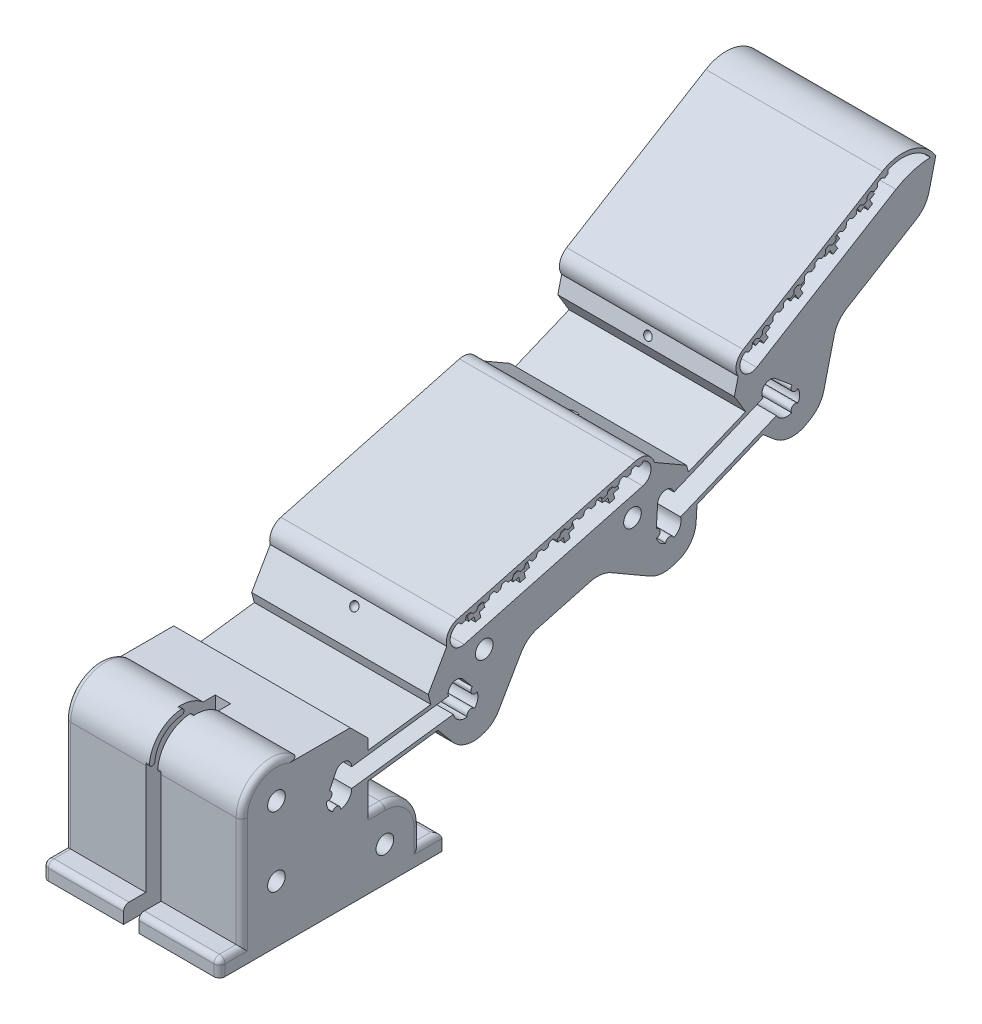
SolidWorks part; units mm, degrees
ref_plane "Front Plane" through (0, 0, 0) normal (0, 0, 1) x (1, 0, 0)
ref_plane "Top Plane" through (0, 0, 0) normal (0, 1, 0) x (1, 0, 0)
ref_plane "Right Plane" through (0, 0, 0) normal (1, 0, 0) x (0, 0, -1)
sketch "Sketch1" plane through (0, 0, 0) normal (0, 0, 1) x (1, 0, 0)
  line L0 (0, 0) -> (0, 9) construction
  line L1 (0, 0) -> (-15.875, 0) construction
  line L3 (-15.875, 9) -> (15.875, 9)
  line L4 (-15.875, 9) -> (-15.875, -9)
  line L5 (-15.875, -9) -> (15.875, -9)
  line L6 (15.875, 9) -> (15.875, -9)
  dimension "D1" = 31.75
  dimension "D2" = 18
extrude "Base" add sketch "Sketch1" along normal mid plane 22.75
sketch "Sketch3" plane through (15.875, 0, 0) normal (1, 0, 0) x (0, 0, -1)
  line L0 (0, 0) -> (11.375, 0) construction
  line L1 (11.375, -9) -> (11.375, 9) construction
  line L2 (11.375, 0) -> (23.2723, 1.5663) construction
  line L3 (23.2723, 1.5663) -> (69.7359, 14.0162) construction
  line L4 (69.7359, 14.0162) -> (80.8225, 18.6084) construction
  line L5 (80.8225, 18.6084) -> (109.9202, 36.3123) construction
  line L6 (17.3237, 0.7832) -> (75.2792, 16.3123) construction
  line L7 (75.2792, 16.3123) -> (109.9202, 36.3123) construction
  line L8 (11.375, 2.4005) -> (22.651, 3.8851)
  line L9 (11.375, -2.4005) -> (23.8936, -0.7524)
  line L10 (20.943, 10.2596) -> (25.6017, -7.127) construction
  line L11 (22.651, 3.8851) -> (20.943, 10.2596)
  line L12 (20.943, 10.2596) -> (67.4066, 22.7095)
  line L13 (23.8936, -0.7524) -> (25.6017, -7.127)
  line L14 (25.6017, -7.127) -> (72.0653, 5.3229)
  line L15 (67.4066, 22.7095) -> (72.0653, 5.3229) construction
  line L16 (79.255, 21.1848) -> (82.39, 16.032) construction
  line L17 (72.0653, 5.3229) -> (70.5139, 11.1128)
  line L18 (68.958, 16.9196) -> (79.255, 21.1848)
  line L19 (67.4066, 22.7095) -> (68.958, 16.9196)
  line L20 (70.5139, 11.1128) -> (82.39, 16.032)
  line L21 (79.255, 21.1848) -> (76.1445, 26.2971)
  line L22 (76.1445, 26.2971) -> (105.2422, 44.001)
  line L23 (105.2422, 44.001) -> (114.5983, 28.6236)
  line L24 (114.5983, 28.6236) -> (85.5005, 10.9197)
  line L25 (85.5005, 10.9197) -> (82.39, 16.032)
  line L26 (11.375, 2.4005) -> (11.375, -2.4005)
  point P9 (17.3237, 0.7832)
  point P10 (75.2792, 16.3123)
  dimension "D1" = 12
  dimension "D2" = 12
  dimension "D3" = 15
  dimension "D4" = 15
  dimension "D5" = 60
  dimension "D6" = 40
  dimension "D7" = 7.5
  dimension "D8" = 7.5
  dimension "D9" = 4.76
  dimension "D10" = 18
  dimension "D11" = 5.9602
  dimension "D12" = 18
extrude "Finger Frame" add sketch "Sketch3" against normal up to surface (31.75 mm away)
sketch "Sketch22" plane through (0, 0, 0) normal (1, 0, 0) x (0, 0, -1)
  line L1 (-11.375, -7.5) -> (14.375, -7.5)
  line L2 (8.125, -13.75) -> (20.625, -13.75) construction
  line L3 (-11.375, -9) -> (-11.375, 9) construction
  line L4 (20.625, -13.75) -> (20.625, -20)
  line L5 (20.625, -20) -> (-11.375, -20)
  line L6 (-11.375, -20) -> (-11.375, -7.5)
  line L7 (-11.375, -9) -> (11.375, -9) construction
  line L8 (-11.375, -9) -> (11.375, -9) construction
  circle A0 centre (14.375, -13.75) radius 6.25 construction
  circle A1 centre (14.375, -13.75) radius 4.75 construction
  arc A2 (14.375, -7.5) -> (20.625, -13.75) centre (14.375, -13.75) cw
  circle A3 centre (14.375, -13.75) radius 1.5875
  dimension "D1" = 12.5
  dimension "D2" = 9.5
  dimension "D3" = 32
  dimension "D4" = 3.175
extrude "Base Reroute" add sketch "Sketch22" along normal up to surface and the other way up to surface
sketch "Sketch23" plane through (15.875, 0, 0) normal (1, 0, 0) x (0, 0, -1)
  line L1 (-11.375, -20) -> (-15.375, -20)
  line L2 (-11.375, -20) -> (-11.375, -17)
  line L3 (-11.375, -17) -> (-15.375, -17)
  line L4 (-15.375, -20) -> (-15.375, -17)
  line L5 (20.625, -20) -> (24.625, -20)
  line L6 (20.625, -20) -> (20.625, -17)
  line L7 (20.625, -17) -> (24.625, -17)
  line L8 (24.625, -20) -> (24.625, -17)
  dimension "D1" = 3
  dimension "D2" = 4
extrude "Base Tabs" add sketch "Sketch23" against normal up to surface (31.75 mm away)
sketch "Sketch25" plane through (0, -20, 0) normal (0, -1, 0) x (1, 0, 0)
  line L0 (0, 15.375) -> (0, -24.625) construction
  line L1 (-15.875, 15.375) -> (15.875, 15.375) construction
  line L2 (-15.875, -24.625) -> (15.875, -24.625) construction
  line L4 (-1.375, 15.375) -> (1.375, 15.375)
  line L5 (-1.375, 15.375) -> (-1.375, -24.625)
  line L6 (-1.375, -24.625) -> (1.375, -24.625)
  line L7 (1.375, 15.375) -> (1.375, -24.625)
  dimension "D1" = 2.75
extrude "Pulley Clearance 1" cut sketch "Sketch25" against normal up to surface (12.5 mm away)
sketch "Sketch26" plane through (0, 0, 15.375) normal (0, 0, 1) x (1, 0, 0)
  line L0 (1.375, -17) -> (1.375, -20) construction
  line L1 (-1.375, -20) -> (1.375, -20)
  line L2 (-1.375, -20) -> (-1.375, 19.7775)
  line L3 (-1.375, 19.7775) -> (1.375, 19.7775)
  line L4 (1.375, -20) -> (1.375, 19.7775)
extrude "Pulley Clearance 2" cut sketch "Sketch26" against normal blind 16.5
sketch "Sketch4" plane through (15.875, 0, 0) normal (1, 0, 0) x (0, 0, -1)
  line L0 (17.013, 3.1428) -> (17.6343, -1.5765) construction
  line L1 (22.651, 3.8851) -> (11.375, 2.4005) construction
  line L2 (11.375, -2.4005) -> (23.8936, -0.7524) construction
  line L3 (74.3819, 18.4086) -> (76.1765, 14.216) construction
  line L4 (79.255, 21.1848) -> (68.958, 16.9196) construction
  line L5 (79.6232, 20.5796) -> (82.3948, 21.7276)
  line L6 (79.255, 21.1848) -> (82.39, 16.032) construction
  line L7 (68.958, 16.9196) -> (70.5139, 11.1128) construction
  line L8 (11.375, 2.4005) -> (11.375, -2.4005) construction
  line L9 (22.651, 3.8851) -> (23.8936, -0.7524) construction
  line L10 (11.375, 1.6945) -> (22.8338, 3.2031)
  line L11 (11.375, -1.6945) -> (23.7109, -0.0704)
  line L12 (11.375, 0) -> (23.2723, 1.5663) construction
  line L13 (69.7359, 14.0162) -> (80.8225, 18.6084) construction
  line L14 (69.1407, 16.2376) -> (79.6232, 20.5796)
  line L15 (70.3312, 11.7948) -> (82.0218, 16.6372)
  line L16 (11.375, 1.6945) -> (8.4007, 1.3029)
  line L17 (11.375, -1.6945) -> (8.4007, -2.0861)
  line L18 (5.5407, 1.9358) -> (4.1108, -1.1367)
  line L19 (8.4007, 1.3029) -> (8.4007, -2.0861) construction
  line L20 (28.4068, 4.9462) -> (30.5832, 2.3485)
  line L21 (23.7109, -0.0704) -> (26.6852, 0.3211)
  line L22 (22.8338, 3.2031) -> (25.8081, 3.5947)
  line L23 (69.1407, 16.2376) -> (66.3691, 15.0896)
  line L24 (70.3312, 11.7948) -> (67.5595, 10.6467)
  line L25 (63.423, 14.7935) -> (63.1404, 10.2026)
  line L26 (82.0218, 16.6372) -> (84.7935, 17.7853)
  line L27 (66.3691, 15.0896) -> (67.5595, 10.6467) construction
  line L28 (82.3948, 21.7276) -> (84.7935, 17.7853) construction
  line L29 (84.6448, 23.6527) -> (88.1685, 20.6728)
  arc A0 (8.4007, 1.3029) -> (5.5407, 1.9358) centre (6.9007, 1.3029) ccw
  arc A1 (8.4007, -2.0861) -> (4.1108, -1.1367) centre (6.1507, -2.0861) cw
  arc A2 (25.8081, 3.5947) -> (28.4068, 4.9462) centre (27.257, 3.9829) cw
  arc A3 (26.6852, 0.3211) -> (30.5832, 2.3485) centre (28.8586, 0.9035) ccw
  arc A4 (66.3691, 15.0896) -> (63.423, 14.7935) centre (64.9202, 14.7013) ccw
  arc A5 (67.5595, 10.6467) -> (63.1404, 10.2026) centre (65.3862, 10.0644) cw
  arc A6 (82.3948, 21.7276) -> (84.6448, 23.6527) centre (83.6763, 22.5073) cw
  arc A7 (84.7935, 17.7853) -> (88.1685, 20.6728) centre (86.7156, 18.9548) ccw
  dimension "D5" = 1.5
  dimension "D6" = 2.25
  dimension "D1" = 0.7
  dimension "D2" = 0.7
  dimension "D3" = 3
extrude "Flexures" cut sketch "Sketch4" against normal through all
sketch "Sketch5" plane through (15.875, 0, 0) normal (1, 0, 0) x (0, 0, -1)
  line L0 (4.1108, -1.1367) -> (8.4007, -2.0861) construction
  line L1 (6.2557, -1.6114) -> (5.6645, -4.2829) construction
  line L3 (17.1044, 2.4488) -> (17.543, -0.8825) construction
  line L4 (25.8081, 3.5947) -> (8.4007, 1.3029) construction
  line L5 (8.4007, -2.0861) -> (26.6852, 0.3211) construction
  line L6 (67.5595, 10.6467) -> (63.1404, 10.2026) construction
  line L7 (84.7935, 17.7853) -> (88.1685, 20.6728) construction
  line L8 (86.481, 19.229) -> (88.1784, 17.2451) construction
  line L9 (65.35, 10.4247) -> (65.6112, 7.8257) construction
  arc A0 (4.1108, -1.1367) -> (8.4007, -2.0861) centre (6.1507, -2.0861) ccw construction
  circle A1 centre (5.6645, -4.2829) radius 0.75
  circle A2 centre (4.1108, -1.1367) radius 0.75
  circle A3 centre (29.8968, -1.0927) radius 0.75
  circle A4 centre (30.5832, 2.3485) radius 0.75
  arc A5 (84.7935, 17.7853) -> (88.1685, 20.6728) centre (86.7156, 18.9548) ccw construction
  arc A6 (63.1404, 10.2026) -> (67.5595, 10.6467) centre (65.3862, 10.0644) ccw construction
  circle A7 centre (65.6112, 7.8257) radius 0.75
  circle A8 centre (63.1404, 10.2026) radius 0.75
  circle A9 centre (88.1784, 17.2451) radius 0.75
  circle A10 centre (88.1685, 20.6728) radius 0.75
  dimension "D1" = 1.5
  dimension "D2" = 1.5
extrude "Flexure Anchors" add sketch "Sketch5" against normal up to surface (31.75 mm away)
sketch "Sketch6" plane through (15.875, 0, 0) normal (1, 0, 0) x (0, 0, -1)
  line L0 (22.3406, 5.0436) -> (58.9025, 14.8404) construction
  line L1 (67.4066, 22.7095) -> (20.943, 10.2596) construction
  line L2 (25.6017, -7.127) -> (72.0653, 5.3229) construction
  line L3 (44.1748, 16.4846) -> (48.8335, -0.9021) construction
  line L4 (22.1665, 5.6935) -> (20.943, 10.2596)
  line L5 (31.4485, 6.322) -> (19.4934, 13.2243) construction
  line L6 (30.1016, 2.9234) -> (28.4068, 4.9462) construction
  line L7 (22.1665, 5.6935) -> (25.5091, 11.4831)
  line L8 (20.943, 10.2596) -> (22.651, 3.8851) construction
  line L9 (20.943, 10.2596) -> (25.5091, 11.4831)
  line L10 (68.6301, 18.1434) -> (67.4066, 22.7095)
  line L11 (67.4066, 22.7095) -> (62.8404, 21.486)
  line L12 (68.6301, 18.1434) -> (62.8404, 21.486)
  line L13 (67.4066, 22.7095) -> (76.1445, 26.2971) construction
  line L14 (71.7755, 24.5033) -> (74.1065, 19.0522) construction
  line L15 (79.255, 21.1848) -> (68.958, 16.9196) construction
  line L16 (76.1445, 26.2971) -> (77.2196, 24.53)
  line L17 (76.1445, 26.2971) -> (79.255, 21.1848) construction
  line L18 (77.2196, 24.53) -> (77.9116, 27.3723)
  line L19 (105.2422, 44.001) -> (76.1445, 26.2971) construction
  line L20 (77.9116, 27.3723) -> (76.1445, 26.2971)
  line L25 (17.013, 3.1428) -> (17.543, -0.8825) construction
  line L26 (22.651, 3.8851) -> (11.375, 2.4005) construction
  line L27 (8.4007, -2.0861) -> (26.6852, 0.3211) construction
  line L28 (11.375, 4.2728) -> (11.375, 9)
  line L29 (11.375, 4.2728) -> (6.6478, 9)
  line L30 (11.375, 9) -> (6.6478, 9)
  line L31 (17.278, 1.1302) -> (30.1808, 2.8288) construction
  line L32 (63.2088, 11.3126) -> (87.3919, 21.3295) construction
  line L33 (63.423, 14.7935) -> (63.1865, 10.9512) construction
  line L34 (87.5959, 21.1571) -> (84.6448, 23.6527) construction
  line L35 (67.5595, 10.6467) -> (84.7935, 17.7853) construction
  line L36 (82.3948, 21.7276) -> (66.3691, 15.0896) construction
  circle A0 centre (32.2423, 7.6968) radius 1.5875
  circle A2 centre (58.9025, 14.8404) radius 1.5875
  point P73 (24.7591, 10.1841)
  point P77 (77.5568, 25.9148)
  dimension "D1" = 3.175
  dimension "D2" = 8
  dimension "D3" = 45
  dimension "D4" = 1.5
  dimension "D8" = 1.5
  dimension "D9" = 8
  dimension "D10" = 5.4
extrude "Pin Holes" cut sketch "Sketch6" against normal through all
sketch "Sketch24" plane through (15.875, 0, 0) normal (1, 0, 0) x (0, 0, -1)
  line L0 (-11.375, 9) -> (6.6478, 9) construction
  line L1 (-11.375, -17) -> (-11.375, 9) construction
  line L2 (-5.125, 9) -> (-5.125, -20) construction
  line L3 (24.625, -20) -> (-15.375, -20) construction
  line L4 (-5.125, 7.5) -> (8.1478, 7.5) construction
  line L5 (6.6478, 9) -> (11.375, 4.2728) construction
  line L6 (-11.375, 9) -> (6.6478, 9)
  line L7 (6.6478, 9) -> (8.1478, 7.5)
  line L8 (8.1478, 7.5) -> (-1.063, 7.5)
  line L9 (-11.375, 2.75) -> (1.125, 2.75) construction
  line L10 (-11.375, 2.75) -> (-11.375, 9)
  circle A0 centre (-5.125, 2.75) radius 6.25 construction
  circle A1 centre (-5.125, 2.75) radius 4.75 construction
  circle A2 centre (-5.125, 2.75) radius 1.5875
  circle A3 centre (-5.125, -9.75) radius 6.25 construction
  circle A4 centre (-5.125, -9.75) radius 4.75 construction
  circle A5 centre (-5.125, -9.75) radius 1.5875
  arc A6 (-5.125, 9) -> (-11.375, 2.75) centre (-5.125, 2.75) ccw
  arc A7 (-5.125, 9) -> (-1.063, 7.5) centre (-5.125, 2.75) cw
  dimension "D1" = 12.5
  dimension "D2" = 9.5
  dimension "D3" = 3.175
extrude "Routing Pin Holes" cut sketch "Sketch24" against normal through all contours A6 L6 L10 | L6 A7 L8 L7 | A2 | A5
sketch "Sketch27" plane through (-15.875, 0, 0) normal (-1, 0, 0) x (0, 0, 1)
  line L0 (5.125, 9) -> (5.125, 2.75) construction
  line L1 (5.125, 2.75) -> (11.375, 2.75) construction
  line L2 (-14.375, -13.75) -> (-14.375, -7.5) construction
  line L3 (-14.375, -13.75) -> (-20.625, -13.75) construction
  line L4 (-20.625, -13.75) -> (-19.625, -13.75)
  line L5 (-14.375, -7.5) -> (-14.375, -8.5)
  line L6 (5.125, 9) -> (5.125, 8)
  line L7 (10.375, 2.75) -> (11.375, 2.75)
  arc A0 (11.375, 2.75) -> (1.063, 7.5) centre (5.125, 2.75) ccw construction
  arc A1 (-14.375, -7.5) -> (-20.625, -13.75) centre (-14.375, -13.75) ccw construction
  arc A2 (-14.375, -7.5) -> (-20.625, -13.75) centre (-14.375, -13.75) ccw
  arc A3 (11.375, 2.75) -> (5.125, 9) centre (5.125, 2.75) ccw
  arc A4 (-14.375, -8.5) -> (-19.625, -13.75) centre (-14.375, -13.75) ccw
  arc A5 (5.125, 8) -> (10.375, 2.75) centre (5.125, 2.75) cw
  dimension "D1" = 1
extrude "Pulley Cover" add sketch "Sketch27" against normal up to surface (31.75 mm away)
sketch "Sketch28" plane through (0, 0, 0) normal (1, 0, 0) x (0, 0, -1)
  circle A0 centre (-5.125, 2.75) radius 6.25
  circle A1 centre (14.375, -13.75) radius 6.25
  arc A2 (20.625, -13.75) -> (14.375, -7.5) centre (14.375, -13.75) ccw construction
  arc A3 (-1.063, 7.5) -> (-11.375, 2.75) centre (-5.125, 2.75) ccw construction
extrude "Pulley Cover Cutaway" cut sketch "Sketch28" against normal mid plane 1.5
sketch "Sketch8" plane through (0, -8.175, -14.1595) normal (0, 0.5, 0.866) x (1, 0, 0)
  line L0 (0, 22.6992) -> (0, 16.0139) construction
  line L1 (15.875, 22.6992) -> (-15.875, 22.6992) construction
  line L2 (-15.875, 16.0139) -> (15.875, 16.0139) construction
  circle A0 centre (0, 21.1992) radius 0.75
  dimension "D1" = 1.5
  dimension "D2" = 1.5
extrude "Tendon Route 1" cut sketch "Sketch8" against normal blind 0.75
sketch "Sketch9" plane through (0, -16.3748, -67.2614) normal (0, 0.2365, 0.9716) x (1, 0, 0)
  line L0 (0, 45.0248) -> (0, 42.0995) construction
  line L1 (15.875, 45.0248) -> (-15.875, 45.0248) construction
  line L2 (-15.875, 42.0995) -> (15.875, 42.0995) construction
  circle A0 centre (0, 43.5248) radius 0.75
  dimension "D1" = 1.5
  dimension "D2" = 1.5
extrude "Tendon Route 2" cut sketch "Sketch9" against normal blind 0.75
sketch "Sketch10" plane through (0, 43.3252, -25.0138) normal (0, 0.866, -0.5) x (1, 0, 0)
  line L0 (0, 43.6784) -> (0, 50.3637) construction
  line L1 (-15.875, 43.6784) -> (15.875, 43.6784) construction
  line L2 (15.875, 50.3637) -> (-15.875, 50.3637) construction
  circle A0 centre (0, 45.1784) radius 0.75
  dimension "D1" = 1.5
  dimension "D2" = 1.5
extrude "Tendon Route 3" cut sketch "Sketch10" against normal blind 0.75
fillet "Tendon Route Ports" radius 0.75 3 edges at (0, 20.4615, -63.1149) (0, 25.0087, -78.1081) (0, 9.1596, -25.0336)
sketch "Sketch13" plane through (15.875, 0, 0) normal (1, 0, 0) x (0, 0, -1)
  line L0 (27.4183, 14.79) -> (59.5336, 23.3952)
  line L1 (62.8404, 21.486) -> (25.5091, 11.4831) construction
  line L2 (25.5091, 11.4831) -> (62.8404, 21.486)
  line L3 (78.8148, 31.0823) -> (103.8388, 46.3076)
  line L4 (105.2422, 44.001) -> (77.9116, 27.3723) construction
  line L5 (27.4183, 14.79) -> (28.1171, 12.182) construction
  line L6 (78.8148, 31.0823) -> (80.2182, 28.7757) construction
  line L7 (114.5983, 28.6236) -> (105.2422, 44.001) construction
  line L8 (77.9116, 27.3723) -> (105.2422, 44.001)
  line L9 (105.2422, 44.001) -> (111.1157, 34.3474)
  arc A0 (25.5091, 11.4831) -> (27.4183, 14.79) centre (28.1171, 12.182) cw
  arc A1 (62.8404, 21.486) -> (59.5336, 23.3952) centre (60.2324, 20.7872) ccw
  arc A2 (77.9116, 27.3723) -> (78.8148, 31.0823) centre (80.2182, 28.7757) cw
  arc A3 (103.8388, 46.3076) -> (111.1157, 34.3474) centre (107.4773, 40.3275) cw
  dimension "D2" = 7
  dimension "D1" = 2.7
extrude "Finger Pad Outline" add sketch "Sketch13" against normal up to surface (31.75 mm away)
sketch "Sketch12" plane through (15.875, 0, 0) normal (1, 0, 0) x (0, 0, -1)
  line L0 (23.8936, -0.7524) -> (28.5685, -6.3321)
  line L1 (25.6017, -7.127) -> (72.0653, 5.3229) construction
  line L2 (70.5139, 11.1128) -> (70.1255, 4.8031)
  line L3 (82.39, 16.032) -> (87.2073, 11.9582)
  line L4 (85.5005, 10.9197) -> (114.5983, 28.6236) construction
  line L5 (87.5959, 21.1571) -> (84.6448, 23.6527) construction
  line L6 (63.423, 14.7935) -> (63.1865, 10.9512) construction
  line L7 (30.1016, 2.9234) -> (28.4068, 4.9462) construction
  line L8 (23.8936, -0.7524) -> (25.6017, -7.127)
  line L9 (25.6017, -7.127) -> (28.5685, -6.3321)
  line L10 (70.5139, 11.1128) -> (72.0653, 5.3229)
  line L11 (72.0653, 5.3229) -> (70.1255, 4.8031)
  line L12 (82.39, 16.032) -> (85.5005, 10.9197)
  line L13 (85.5005, 10.9197) -> (87.2073, 11.9582)
  line L14 (25.8081, 3.5947) -> (26.6852, 0.3211) construction
  line L15 (66.3691, 15.0896) -> (67.5595, 10.6467) construction
  line L16 (26.2467, 1.9579) -> (66.9643, 12.8681) construction
  line L17 (59.5336, 23.3952) -> (27.4183, 14.79) construction
  line L18 (53.3118, 9.21) -> (66.9643, 12.8681) construction
  line L19 (43.476, 19.0926) -> (48.8335, -0.9021) construction
  line L20 (83.5941, 19.7565) -> (95.6689, 27.1031) construction
  line L21 (92.812, 15.3682) -> (95.6689, 27.1031)
  line L22 (33.8121, -4.9271) -> (39.8992, 5.6161)
  line L23 (22.1665, 5.6935) -> (25.5091, 11.4831) construction
  line L24 (39.8992, 5.6161) -> (53.3118, 9.21)
  line L25 (33.8121, -4.9271) -> (63.8549, 3.1229)
  line L26 (63.8549, 3.1229) -> (53.3118, 9.21)
  line L27 (28.5685, -6.3321) -> (33.8121, -4.9271) construction
  line L28 (95.6689, 27.1031) -> (111.7313, 36.8759)
  line L29 (113.4574, 43.966) -> (120.5784, 32.2621)
  line L30 (120.5784, 32.2621) -> (92.812, 15.3682)
  line L31 (111.7313, 36.8759) -> (113.4574, 43.966)
  line L32 (77.2196, 24.53) -> (77.9116, 27.3723) construction
  line L33 (82.3948, 21.7276) -> (84.7935, 17.7853) construction
  line L34 (83.5941, 19.7565) -> (116.1394, 39.5579) construction
  arc A1 (111.1157, 34.3474) -> (103.8388, 46.3076) centre (107.4773, 40.3275) ccw construction
  point P51 (46.6055, 7.413)
  dimension "D1" = 8.5
extrude "Finger Outline" cut sketch "Sketch12" against normal through all
sketch "Sketch14" plane through (15.875, 0, 0) normal (1, 0, 0) x (0, 0, -1)
  line L0 (27.4183, 14.79) -> (28.1171, 12.182) construction
  line L1 (43.476, 19.0926) -> (46.6055, 7.413) construction
  line L2 (59.5336, 23.3952) -> (27.4183, 14.79) construction
  line L3 (53.3118, 9.21) -> (39.8992, 5.6161) construction
  line L4 (59.5336, 23.3952) -> (60.2324, 20.7872) construction
  line L5 (27.5995, 14.1138) -> (59.7148, 22.7191)
  line L6 (28.6348, 10.2501) -> (60.7501, 18.8554)
  line L7 (103.8388, 46.3076) -> (106.2818, 42.2924) construction
  line L8 (113.4574, 43.966) -> (88.7634, 28.9415) construction
  line L9 (103.8388, 46.3076) -> (78.8148, 31.0823) construction
  line L10 (79.1786, 30.4843) -> (104.2026, 45.7096)
  line L11 (81.2578, 27.0671) -> (106.2818, 42.2924)
  circle A0 centre (28.1171, 12.182) radius 2 construction
  arc A1 (27.4183, 14.79) -> (25.5091, 11.4831) centre (28.1171, 12.182) ccw construction
  circle A2 centre (60.2324, 20.7872) radius 2 construction
  arc A3 (27.5995, 14.1138) -> (28.6348, 10.2501) centre (28.1171, 12.182) ccw
  arc A4 (59.7148, 22.7191) -> (60.7501, 18.8554) centre (60.2324, 20.7872) cw
  circle A5 centre (80.2182, 28.7757) radius 2 construction
  arc A6 (78.8148, 31.0823) -> (77.9116, 27.3723) centre (80.2182, 28.7757) ccw construction
  arc A7 (79.1786, 30.4843) -> (81.2578, 27.0671) centre (80.2182, 28.7757) ccw
  arc A8 (104.2026, 45.7096) -> (112.4622, 44.1799) centre (107.4773, 40.3275) cw
  arc A9 (106.2818, 42.2924) -> (112.4622, 44.1799) centre (113.0649, 31.1438) cw
  dimension "D1" = 0.7
  dimension "D2" = 0.7
  dimension "D3" = 0.7
extrude "Finger Pad Cavity" cut sketch "Sketch14" against normal through all and the other way through all contours A4 L5 A3 L6 | L11 A9 A8 L10 A7
sketch "Sketch15" plane through (0, 0, 0) normal (1, 0, 0) x (0, 0, -1)
  line L0 (31.6502, 9.9063) -> (58.3105, 17.0499)
  line L1 (67.5595, 10.6467) -> (66.3691, 15.0896) construction
  line L2 (30.3685, 6.3847) -> (35.8353, -1.4227)
  line L3 (39.8992, 5.6161) -> (33.8121, -4.9271) construction
  line L5 (44.9803, 13.4781) -> (51.4984, -10.8476) construction
  line L6 (61.1813, 14.641) -> (60.3506, 5.1461)
  line L7 (35.8353, -1.4227) -> (60.3506, 5.1461)
  line L8 (86.6313, 24.9873) -> (93.7636, 19.2768)
  line L9 (86.872, 28.7271) -> (107.9615, 41.5586)
  line L10 (107.9615, 41.5586) -> (117.644, 33.8063)
  line L11 (117.644, 33.8063) -> (93.7636, 19.2768)
  line L12 (95.6689, 27.1031) -> (92.812, 15.3682) construction
  line L13 (106.2818, 42.2924) -> (81.2578, 27.0671) construction
  line L14 (82.3948, 21.7276) -> (84.7935, 17.7853) construction
  line L17 (66.9643, 12.8681) -> (83.5941, 19.7565) construction
  line L18 (66.9643, 12.8681) -> (61.1813, 14.641) construction
  line L19 (83.5941, 19.7565) -> (86.6313, 24.9873) construction
  circle A0 centre (32.2423, 7.6968) radius 2.2875 construction
  circle A1 centre (58.9025, 14.8404) radius 2.2875 construction
  circle A2 centre (32.2423, 7.6968) radius 1.5875 construction
  arc A3 (31.6502, 9.9063) -> (30.3685, 6.3847) centre (32.2423, 7.6968) ccw
  arc A4 (58.3105, 17.0499) -> (61.1813, 14.641) centre (58.9025, 14.8404) cw
  arc A5 (86.872, 28.7271) -> (86.6313, 24.9873) centre (88.061, 26.7729) ccw
  dimension "D1" = 0.7
  dimension "D2" = 1.5
  dimension "D3" = 70
  dimension "D4" = 6
  dimension "D5" = 70
extrude "Back Cutaway" cut sketch "Sketch15" against normal mid plane 25.75
sketch "Sketch18" plane through (0, 0, 0) normal (1, 0, 0) x (0, 0, -1)
  line L0 (60.7501, 18.8554) -> (28.6348, 10.2501) construction
  line L1 (60.7501, 18.8554) -> (28.6348, 10.2501) construction
  line L2 (59.7148, 22.7191) -> (27.5995, 14.1138) construction
  line L3 (59.7148, 22.7191) -> (27.5995, 14.1138) construction
  line L4 (43.6571, 18.4164) -> (44.6924, 14.5527) construction
  line L5 (32.3903, 12.2917) -> (32.1315, 13.2576) construction
  line L6 (27.5995, 14.1138) -> (28.6348, 10.2501) construction
  line L7 (28.1171, 12.182) -> (44.1748, 16.4846) construction
  line L8 (36.1459, 14.3333) -> (36.6636, 12.4014) construction
  line L9 (30.6826, 12.8694) -> (30.9415, 11.9035)
  line L10 (30.9415, 11.9035) -> (31.9074, 12.1623)
  line L11 (31.9074, 12.1623) -> (32.1662, 11.1964)
  line L12 (32.1662, 11.1964) -> (33.1321, 11.4552)
  line L13 (38.9703, 14.0548) -> (38.7115, 15.0207)
  line L14 (33.1321, 11.4552) -> (32.8733, 12.4211)
  line L15 (32.8733, 12.4211) -> (33.8392, 12.6799)
  line L16 (33.8392, 12.6799) -> (33.5804, 13.6458)
  line L17 (33.5804, 13.6458) -> (30.6826, 12.8694)
  line L18 (36.4048, 13.3673) -> (28.3759, 11.216) construction
  line L19 (39.9362, 14.3136) -> (38.9703, 14.0548)
  line L20 (40.195, 13.3477) -> (39.9362, 14.3136)
  line L21 (41.161, 13.6065) -> (40.195, 13.3477)
  line L22 (40.9021, 14.5724) -> (41.161, 13.6065)
  line L23 (41.8681, 14.8312) -> (40.9021, 14.5724)
  line L24 (41.6092, 15.7972) -> (41.8681, 14.8312)
  line L25 (38.7115, 15.0207) -> (41.6092, 15.7972)
  line L26 (46.9991, 16.2061) -> (47.965, 16.4649)
  line L27 (47.965, 16.4649) -> (48.2239, 15.499)
  line L28 (48.2239, 15.499) -> (49.1898, 15.7578)
  line L29 (49.1898, 15.7578) -> (48.931, 16.7237)
  line L30 (48.931, 16.7237) -> (49.8969, 16.9826)
  line L31 (46.7403, 17.172) -> (46.9991, 16.2061)
  line L32 (49.6381, 17.9485) -> (46.7403, 17.172)
  line L33 (49.8969, 16.9826) -> (49.6381, 17.9485)
  line L34 (57.2186, 17.9091) -> (56.2527, 17.6503)
  line L35 (55.9939, 18.6162) -> (55.0279, 18.3574)
  line L36 (56.2527, 17.6503) -> (55.9939, 18.6162)
  line L37 (56.9598, 18.875) -> (57.2186, 17.9091)
  line L38 (57.9257, 19.1339) -> (56.9598, 18.875)
  line L39 (55.0279, 18.3574) -> (54.7691, 19.3233)
  line L40 (54.7691, 19.3233) -> (57.6669, 20.0998)
  line L41 (57.6669, 20.0998) -> (57.9257, 19.1339)
  line L42 (106.2818, 42.2924) -> (81.2578, 27.0671) construction
  line L43 (104.2026, 45.7096) -> (79.1786, 30.4843) construction
  line L44 (106.2818, 42.2924) -> (81.2578, 27.0671) construction
  line L45 (104.2026, 45.7096) -> (79.1786, 30.4843) construction
  line L46 (79.1786, 30.4843) -> (81.2578, 27.0671) construction
  line L47 (91.6906, 38.0969) -> (93.7698, 34.6797) construction
  line L48 (80.2182, 28.7757) -> (92.7302, 36.3883) construction
  line L49 (86.4742, 32.582) -> (87.5138, 30.8734) construction
  line L50 (86.994, 31.7277) -> (80.738, 27.9214) construction
  line L51 (83.866, 29.8245) -> (83.3462, 30.6788) construction
  line L54 (82.0648, 29.8992) -> (84.6277, 31.4585)
  line L55 (84.6277, 31.4585) -> (85.1474, 30.6042)
  line L56 (85.1474, 30.6042) -> (84.2931, 30.0844)
  line L57 (84.2931, 30.0844) -> (84.8129, 29.2301)
  line L58 (84.8129, 29.2301) -> (83.9586, 28.7104)
  line L59 (83.9586, 28.7104) -> (83.4388, 29.5647)
  line L60 (83.4388, 29.5647) -> (82.5845, 29.0449)
  line L61 (82.5845, 29.0449) -> (82.0648, 29.8992)
  line L62 (88.8405, 32.8512) -> (89.6948, 33.371)
  line L63 (89.6948, 33.371) -> (90.2146, 32.5167)
  line L64 (90.2146, 32.5167) -> (91.0689, 33.0365)
  line L65 (91.0689, 33.0365) -> (90.5491, 33.8908)
  line L66 (90.5491, 33.8908) -> (91.4034, 34.4105)
  line L67 (88.3208, 33.7055) -> (88.8405, 32.8512)
  line L68 (90.8837, 35.2648) -> (88.3208, 33.7055)
  line L69 (91.4034, 34.4105) -> (90.8837, 35.2648)
  line L70 (100.8328, 41.3182) -> (101.3525, 40.4639)
  line L71 (101.3525, 40.4639) -> (102.2068, 40.9836)
  line L72 (102.2068, 40.9836) -> (102.7266, 40.1293)
  line L73 (102.7266, 40.1293) -> (103.5809, 40.6491)
  line L74 (103.5809, 40.6491) -> (103.0611, 41.5034)
  line L75 (103.0611, 41.5034) -> (103.9154, 42.0232)
  line L76 (103.9154, 42.0232) -> (103.3957, 42.8775)
  line L77 (103.3957, 42.8775) -> (100.8328, 41.3182)
  line L78 (95.0965, 36.6575) -> (94.5768, 37.5118)
  line L79 (95.9508, 37.1773) -> (95.0965, 36.6575)
  line L80 (96.4706, 36.323) -> (95.9508, 37.1773)
  line L81 (97.3249, 36.8428) -> (96.4706, 36.323)
  line L82 (96.8051, 37.6971) -> (97.3249, 36.8428)
  line L83 (97.6594, 38.2169) -> (96.8051, 37.6971)
  line L84 (97.1397, 39.0712) -> (97.6594, 38.2169)
  line L85 (94.5768, 37.5118) -> (97.1397, 39.0712)
extrude "Pad Hooks" add sketch "Sketch18" along normal mid plane 28.75
sketch "Sketch19" plane through (15.875, 0, 0) normal (1, 0, 0) x (0, 0, -1)
  line L0 (27.4183, 14.79) -> (27.5995, 14.1138) construction
  line L1 (27.5995, 14.1138) -> (28.1345, 13.6625)
  line L2 (28.1345, 13.6625) -> (28.8107, 13.8436)
  line L3 (82.3396, 32.4075) -> (81.0581, 31.6278)
  line L4 (28.8107, 13.8436) -> (29.0484, 14.502)
  line L5 (59.7148, 22.7191) -> (27.5995, 14.1138) construction
  line L6 (29.0484, 14.502) -> (27.5995, 14.1138)
  line L7 (31.1734, 15.0714) -> (29.7245, 14.6832)
  line L8 (29.7245, 14.6832) -> (30.2596, 14.2319)
  line L9 (30.2596, 14.2319) -> (30.9357, 14.413)
  line L10 (30.9357, 14.413) -> (31.1734, 15.0714)
  line L11 (33.2984, 15.6408) -> (31.8495, 15.2526)
  line L12 (31.8495, 15.2526) -> (32.3846, 14.8013)
  line L13 (32.3846, 14.8013) -> (33.0607, 14.9824)
  line L14 (33.0607, 14.9824) -> (33.2984, 15.6408)
  line L15 (35.4235, 16.2102) -> (33.9746, 15.822)
  line L16 (33.9746, 15.822) -> (34.5096, 15.3707)
  line L17 (34.5096, 15.3707) -> (35.1858, 15.5518)
  line L18 (35.1858, 15.5518) -> (35.4235, 16.2102)
  line L19 (37.5485, 16.7796) -> (36.0996, 16.3914)
  line L20 (36.0996, 16.3914) -> (36.6347, 15.9401)
  line L21 (36.6347, 15.9401) -> (37.3108, 16.1212)
  line L22 (37.3108, 16.1212) -> (37.5485, 16.7796)
  line L23 (39.6735, 17.349) -> (38.2247, 16.9608)
  line L24 (38.2247, 16.9608) -> (38.7597, 16.5095)
  line L25 (38.7597, 16.5095) -> (39.4359, 16.6906)
  line L26 (39.4359, 16.6906) -> (39.6735, 17.349)
  line L27 (41.7986, 17.9184) -> (40.3497, 17.5302)
  line L28 (40.3497, 17.5302) -> (40.8847, 17.0789)
  line L29 (40.8847, 17.0789) -> (41.5609, 17.26)
  line L30 (41.5609, 17.26) -> (41.7986, 17.9184)
  line L31 (43.9236, 18.4878) -> (42.4747, 18.0996)
  line L32 (42.4747, 18.0996) -> (43.0098, 17.6483)
  line L33 (43.0098, 17.6483) -> (43.6859, 17.8294)
  line L34 (43.6859, 17.8294) -> (43.9236, 18.4878)
  line L35 (46.0487, 19.0572) -> (44.5998, 18.669)
  line L36 (44.5998, 18.669) -> (45.1348, 18.2177)
  line L37 (45.1348, 18.2177) -> (45.811, 18.3988)
  line L38 (45.811, 18.3988) -> (46.0487, 19.0572)
  line L39 (48.1737, 19.6267) -> (46.7248, 19.2384)
  line L40 (46.7248, 19.2384) -> (47.2599, 18.7871)
  line L41 (47.2599, 18.7871) -> (47.936, 18.9682)
  line L42 (47.936, 18.9682) -> (48.1737, 19.6267)
  line L43 (50.2987, 20.1961) -> (48.8498, 19.8078)
  line L44 (48.8498, 19.8078) -> (49.3849, 19.3565)
  line L45 (49.3849, 19.3565) -> (50.061, 19.5376)
  line L46 (50.061, 19.5376) -> (50.2987, 20.1961)
  line L47 (52.4238, 20.7655) -> (50.9749, 20.3772)
  line L48 (50.9749, 20.3772) -> (51.5099, 19.9259)
  line L49 (51.5099, 19.9259) -> (52.1861, 20.107)
  line L50 (52.1861, 20.107) -> (52.4238, 20.7655)
  line L51 (54.5488, 21.3349) -> (53.0999, 20.9466)
  line L52 (53.0999, 20.9466) -> (53.635, 20.4953)
  line L53 (53.635, 20.4953) -> (54.3111, 20.6764)
  line L54 (54.3111, 20.6764) -> (54.5488, 21.3349)
  line L55 (56.6738, 21.9043) -> (55.225, 21.516)
  line L56 (55.225, 21.516) -> (55.76, 21.0647)
  line L57 (55.76, 21.0647) -> (56.4362, 21.2458)
  line L58 (56.4362, 21.2458) -> (56.6738, 21.9043)
  line L59 (58.7989, 22.4737) -> (57.35, 22.0854)
  line L60 (57.35, 22.0854) -> (57.885, 21.6341)
  line L61 (57.885, 21.6341) -> (58.5612, 21.8153)
  line L62 (58.5612, 21.8153) -> (58.7989, 22.4737)
  line L63 (60.9239, 23.0431) -> (59.475, 22.6548)
  line L64 (59.475, 22.6548) -> (60.0101, 22.2035)
  line L65 (60.0101, 22.2035) -> (60.6862, 22.3847)
  line L66 (60.6862, 22.3847) -> (60.9239, 23.0431)
  line L67 (78.8148, 31.0823) -> (79.1786, 30.4843) construction
  line L68 (79.1786, 30.4843) -> (79.819, 30.2014)
  line L69 (79.819, 30.2014) -> (80.417, 30.5653)
  line L70 (80.417, 30.5653) -> (80.4601, 31.2639)
  line L71 (104.2026, 45.7096) -> (79.1786, 30.4843) construction
  line L72 (80.4601, 31.2639) -> (79.1786, 30.4843)
  line L73 (81.0581, 31.6278) -> (81.6984, 31.3449)
  line L74 (81.6984, 31.3449) -> (82.2964, 31.7088)
  line L75 (82.2964, 31.7088) -> (82.3396, 32.4075)
  line L76 (84.219, 33.551) -> (82.9376, 32.7713)
  line L77 (82.9376, 32.7713) -> (83.5779, 32.4885)
  line L78 (83.5779, 32.4885) -> (84.1759, 32.8523)
  line L79 (84.1759, 32.8523) -> (84.219, 33.551)
  line L80 (86.0985, 34.6945) -> (84.817, 33.9148)
  line L81 (84.817, 33.9148) -> (85.4573, 33.632)
  line L82 (85.4573, 33.632) -> (86.0553, 33.9958)
  line L83 (86.0553, 33.9958) -> (86.0985, 34.6945)
  line L84 (87.9779, 35.838) -> (86.6965, 35.0583)
  line L85 (86.6965, 35.0583) -> (87.3368, 34.7755)
  line L86 (87.3368, 34.7755) -> (87.9348, 35.1393)
  line L87 (87.9348, 35.1393) -> (87.9779, 35.838)
  line L88 (89.8574, 36.9815) -> (88.5759, 36.2019)
  line L89 (88.5759, 36.2019) -> (89.2163, 35.919)
  line L90 (89.2163, 35.919) -> (89.8143, 36.2829)
  line L91 (89.8143, 36.2829) -> (89.8574, 36.9815)
  line L92 (91.7369, 38.125) -> (90.4554, 37.3454)
  line L93 (90.4554, 37.3454) -> (91.0957, 37.0625)
  line L94 (91.0957, 37.0625) -> (91.6937, 37.4264)
  line L95 (91.6937, 37.4264) -> (91.7369, 38.125)
  line L96 (93.6163, 39.2686) -> (92.3349, 38.4889)
  line L97 (92.3349, 38.4889) -> (92.9752, 38.2061)
  line L98 (92.9752, 38.2061) -> (93.5732, 38.5699)
  line L99 (93.5732, 38.5699) -> (93.6163, 39.2686)
  line L100 (95.4958, 40.4121) -> (94.2143, 39.6324)
  line L101 (94.2143, 39.6324) -> (94.8546, 39.3496)
  line L102 (94.8546, 39.3496) -> (95.4526, 39.7134)
  line L103 (95.4526, 39.7134) -> (95.4958, 40.4121)
  line L104 (97.3752, 41.5556) -> (96.0938, 40.7759)
  line L105 (96.0938, 40.7759) -> (96.7341, 40.4931)
  line L106 (96.7341, 40.4931) -> (97.3321, 40.8569)
  line L107 (97.3321, 40.8569) -> (97.3752, 41.5556)
  line L108 (99.2547, 42.6991) -> (97.9732, 41.9194)
  line L109 (97.9732, 41.9194) -> (98.6136, 41.6366)
  line L110 (98.6136, 41.6366) -> (99.2116, 42.0004)
  line L111 (99.2116, 42.0004) -> (99.2547, 42.6991)
  line L112 (101.1342, 43.8426) -> (99.8527, 43.063)
  line L113 (99.8527, 43.063) -> (100.493, 42.7801)
  line L114 (100.493, 42.7801) -> (101.091, 43.144)
  line L115 (101.091, 43.144) -> (101.1342, 43.8426)
  line L116 (103.0136, 44.9862) -> (101.7322, 44.2065)
  line L117 (101.7322, 44.2065) -> (102.3725, 43.9236)
  line L118 (102.3725, 43.9236) -> (102.9705, 44.2875)
  line L119 (102.9705, 44.2875) -> (103.0136, 44.9862)
  line L120 (104.8931, 46.1297) -> (103.6116, 45.35)
  line L121 (103.6116, 45.35) -> (104.2519, 45.0672)
  line L122 (104.2519, 45.0672) -> (104.8499, 45.431)
  line L123 (104.8499, 45.431) -> (104.8931, 46.1297)
  dimension "D1" = 1.5
  dimension "D3" = 0.7
  dimension "D2" = 0.7
  dimension "D4" = 1.5
  dimension "D5" = 16
  dimension "D6" = 14
extrude "Ridges" add sketch "Sketch19" against normal up to surface (31.75 mm away)
fillet "Finger Contouring" radius 5 14 edges at (14.375, 9.21, -53.3118) (-14.375, 9.21, -53.3118) (-14.375, 5.6161, -39.8992) (14.375, 5.6161, -39.8992) (0, -4.9271, -33.8121) (0, 3.1229, -63.8549) (0, 15.3682, -92.812) (0, 11.9582, -87.2073) (0, 4.8031, -70.1255) (0, -6.3321, -28.5685) (0, 41.5586, -107.9615) (14.375, 36.8759, -111.7313) (-14.375, 27.1031, -95.6689) (14.375, 27.1031, -95.6689)
fillet "Contouring" radius 1 21 edges at (15.875, 8.4267, 7.7398) (-15.875, 8.4267, 7.7398) (-15.875, -18.5, 15.375) (15.875, -18.5, 15.375) (-8.625, -17, 15.375) (8.625, -17, 15.375) (-15.875, -9.3306, -18.7944) (15.875, -9.3306, -18.7944) (-15.875, -15.375, -20.625) (15.875, -15.375, -20.625) (-15.875, -17, -22.625) (15.875, -17, -22.625) (8.625, -17, -24.625) (-8.625, -17, -24.625) (-15.875, -18.5, -24.625) (-15.875, -7.5, -12.875) (15.875, -7.5, -12.875)
fillet "Pulley Cover Fillet" radius 0.5 16 edges at (1.0625, 8, 5.125) (1.0625, 9, 5.125) (-1.0625, 8, 5.125) (-1.0625, 9, 5.125) (1.0625, 2.75, 10.375) (1.0625, 2.75, 11.375) (-1.0625, 2.75, 10.375) (-1.0625, 2.75, 11.375) (-1.0625, -8.5, -14.375) (-1.0625, -7.5, -14.375) (1.0625, -8.5, -14.375) (1.0625, -7.5, -14.375) (-1.0625, -13.75, -19.625) (-1.0625, -13.75, -20.625) (1.0625, -13.75, -19.625) (1.0625, -13.75, -20.625)
sketch "Sketch20" plane through (15.875, 0, 0) normal (1, 0, 0) x (0, 0, -1)
  line L0 (5.5407, 1.9358) -> (4.4272, -0.4567) construction
  line L1 (25.8081, 3.5947) -> (8.4007, 1.3029) construction
  line L2 (8.4007, -2.0861) -> (26.6852, 0.3211) construction
  line L3 (30.1016, 2.9234) -> (28.4068, 4.9462) construction
  line L4 (63.423, 14.7935) -> (63.1865, 10.9512) construction
  line L5 (82.3948, 21.7276) -> (66.3691, 15.0896) construction
  line L6 (67.5595, 10.6467) -> (84.7935, 17.7853) construction
  line L7 (87.5959, 21.1571) -> (84.6448, 23.6527) construction
  line L8 (5.5407, 1.9358) -> (4.4272, -0.4567)
  line L9 (25.8081, 3.5947) -> (8.4007, 1.3029)
  line L10 (8.4007, -2.0861) -> (26.6852, 0.3211)
  line L11 (30.1016, 2.9234) -> (28.4068, 4.9462)
  line L12 (63.423, 14.7935) -> (63.1865, 10.9512)
  line L13 (82.3948, 21.7276) -> (66.3691, 15.0896)
  line L14 (67.5595, 10.6467) -> (84.7935, 17.7853)
  line L15 (87.5959, 21.1571) -> (84.6448, 23.6527)
  line L16 (106.2818, 42.2924) -> (81.2578, 27.0671) construction
  line L18 (106.2818, 42.2924) -> (81.2578, 27.0671)
  line L19 (60.7501, 18.8554) -> (28.6348, 10.2501) construction
  line L20 (60.6862, 22.3847) -> (60.8017, 22.7045) construction
  line L21 (60.0101, 22.2035) -> (60.6862, 22.3847) construction
  line L26 (59.475, 22.6548) -> (60.0101, 22.2035) construction
  line L27 (59.475, 22.6548) -> (58.7989, 22.4737) construction
  line L28 (58.5612, 21.8153) -> (58.7989, 22.4737) construction
  line L29 (57.885, 21.6341) -> (58.5612, 21.8153) construction
  line L42 (27.5995, 14.1138) -> (28.1345, 13.6625) construction
  line L43 (28.1345, 13.6625) -> (28.8107, 13.8436) construction
  line L44 (28.8107, 13.8436) -> (29.0484, 14.502) construction
  line L45 (29.7245, 14.6832) -> (29.0484, 14.502) construction
  line L46 (29.7245, 14.6832) -> (30.2596, 14.2319) construction
  line L47 (30.2596, 14.2319) -> (30.9357, 14.413) construction
  line L48 (30.9357, 14.413) -> (31.1734, 15.0714) construction
  line L49 (31.8495, 15.2526) -> (31.1734, 15.0714) construction
  line L50 (31.8495, 15.2526) -> (32.3846, 14.8013) construction
  line L51 (32.3846, 14.8013) -> (33.0607, 14.9824) construction
  line L52 (57.35, 22.0854) -> (57.885, 21.6341) construction
  line L53 (57.35, 22.0854) -> (56.6738, 21.9043) construction
  line L54 (79.819, 30.2014) -> (80.417, 30.5653) construction
  line L55 (79.819, 30.2014) -> (80.417, 30.5653)
  line L56 (56.4362, 21.2458) -> (56.6738, 21.9043) construction
  line L57 (55.76, 21.0647) -> (56.4362, 21.2458) construction
  line L58 (55.225, 21.516) -> (55.76, 21.0647) construction
  line L59 (55.225, 21.516) -> (54.5488, 21.3349) construction
  line L60 (60.7501, 18.8554) -> (28.6348, 10.2501)
  line L61 (60.6862, 22.3847) -> (60.8017, 22.7045)
  line L62 (60.0101, 22.2035) -> (60.6862, 22.3847)
  line L63 (59.475, 22.6548) -> (60.0101, 22.2035)
  line L64 (59.475, 22.6548) -> (58.7989, 22.4737)
  line L65 (58.5612, 21.8153) -> (58.7989, 22.4737)
  line L66 (57.885, 21.6341) -> (58.5612, 21.8153)
  line L67 (27.5995, 14.1138) -> (28.1345, 13.6625)
  line L68 (28.1345, 13.6625) -> (28.8107, 13.8436)
  line L69 (28.8107, 13.8436) -> (29.0484, 14.502)
  line L70 (29.7245, 14.6832) -> (29.0484, 14.502)
  line L71 (29.7245, 14.6832) -> (30.2596, 14.2319)
  line L72 (30.2596, 14.2319) -> (30.9357, 14.413)
  line L73 (30.9357, 14.413) -> (31.1734, 15.0714)
  line L74 (31.8495, 15.2526) -> (31.1734, 15.0714)
  line L75 (31.8495, 15.2526) -> (32.3846, 14.8013)
  line L76 (32.3846, 14.8013) -> (33.0607, 14.9824)
  line L77 (57.35, 22.0854) -> (57.885, 21.6341)
  line L78 (57.35, 22.0854) -> (56.6738, 21.9043)
  line L79 (56.4362, 21.2458) -> (56.6738, 21.9043)
  line L80 (55.76, 21.0647) -> (56.4362, 21.2458)
  line L81 (55.225, 21.516) -> (55.76, 21.0647)
  line L82 (55.225, 21.516) -> (54.5488, 21.3349)
  line L83 (33.0607, 14.9824) -> (33.2984, 15.6408) construction
  line L84 (33.9746, 15.822) -> (33.2984, 15.6408) construction
  line L85 (33.9746, 15.822) -> (34.5096, 15.3707) construction
  line L86 (34.5096, 15.3707) -> (35.1858, 15.5518) construction
  line L87 (35.1858, 15.5518) -> (35.4235, 16.2102) construction
  line L88 (36.0996, 16.3914) -> (35.4235, 16.2102) construction
  line L89 (36.0996, 16.3914) -> (36.6347, 15.9401) construction
  line L90 (36.6347, 15.9401) -> (37.3108, 16.1212) construction
  line L91 (37.3108, 16.1212) -> (37.5485, 16.7796) construction
  line L92 (38.2247, 16.9608) -> (37.5485, 16.7796) construction
  line L93 (38.2247, 16.9608) -> (38.7597, 16.5095) construction
  line L94 (38.7597, 16.5095) -> (39.4359, 16.6906) construction
  line L95 (39.4359, 16.6906) -> (39.6735, 17.349) construction
  line L96 (40.3497, 17.5302) -> (39.6735, 17.349) construction
  line L97 (40.3497, 17.5302) -> (40.8847, 17.0789) construction
  line L98 (40.8847, 17.0789) -> (41.5609, 17.26) construction
  line L99 (41.5609, 17.26) -> (41.7986, 17.9184) construction
  line L100 (42.4747, 18.0996) -> (41.7986, 17.9184) construction
  line L101 (42.4747, 18.0996) -> (43.0098, 17.6483) construction
  line L102 (43.0098, 17.6483) -> (43.6859, 17.8294) construction
  line L103 (43.6859, 17.8294) -> (43.9236, 18.4878) construction
  line L104 (44.5998, 18.669) -> (43.9236, 18.4878) construction
  line L105 (44.5998, 18.669) -> (45.1348, 18.2177) construction
  line L106 (45.1348, 18.2177) -> (45.811, 18.3988) construction
  line L107 (45.811, 18.3988) -> (46.0487, 19.0572) construction
  line L108 (46.7248, 19.2384) -> (46.0487, 19.0572) construction
  line L109 (46.7248, 19.2384) -> (47.2599, 18.7871) construction
  line L110 (47.2599, 18.7871) -> (47.936, 18.9682) construction
  line L111 (47.936, 18.9682) -> (48.1737, 19.6267) construction
  line L112 (48.8498, 19.8078) -> (48.1737, 19.6267) construction
  line L113 (48.8498, 19.8078) -> (49.3849, 19.3565) construction
  line L114 (49.3849, 19.3565) -> (50.061, 19.5376) construction
  line L115 (50.061, 19.5376) -> (50.2987, 20.1961) construction
  line L116 (50.9749, 20.3772) -> (50.2987, 20.1961) construction
  line L117 (50.9749, 20.3772) -> (51.5099, 19.9259) construction
  line L118 (51.5099, 19.9259) -> (52.1861, 20.107) construction
  line L119 (52.1861, 20.107) -> (52.4238, 20.7655) construction
  line L120 (53.0999, 20.9466) -> (52.4238, 20.7655) construction
  line L121 (53.0999, 20.9466) -> (53.635, 20.4953) construction
  line L122 (53.635, 20.4953) -> (54.3111, 20.6764) construction
  line L123 (54.3111, 20.6764) -> (54.5488, 21.3349) construction
  line L124 (33.0607, 14.9824) -> (33.2984, 15.6408)
  line L125 (33.9746, 15.822) -> (33.2984, 15.6408)
  line L126 (33.9746, 15.822) -> (34.5096, 15.3707)
  line L127 (34.5096, 15.3707) -> (35.1858, 15.5518)
  line L128 (35.1858, 15.5518) -> (35.4235, 16.2102)
  line L129 (36.0996, 16.3914) -> (35.4235, 16.2102)
  line L130 (36.0996, 16.3914) -> (36.6347, 15.9401)
  line L131 (36.6347, 15.9401) -> (37.3108, 16.1212)
  line L132 (37.3108, 16.1212) -> (37.5485, 16.7796)
  line L133 (38.2247, 16.9608) -> (37.5485, 16.7796)
  line L134 (38.2247, 16.9608) -> (38.7597, 16.5095)
  line L135 (38.7597, 16.5095) -> (39.4359, 16.6906)
  line L136 (39.4359, 16.6906) -> (39.6735, 17.349)
  line L137 (40.3497, 17.5302) -> (39.6735, 17.349)
  line L138 (40.3497, 17.5302) -> (40.8847, 17.0789)
  line L139 (40.8847, 17.0789) -> (41.5609, 17.26)
  line L140 (41.5609, 17.26) -> (41.7986, 17.9184)
  line L141 (42.4747, 18.0996) -> (41.7986, 17.9184)
  line L142 (42.4747, 18.0996) -> (43.0098, 17.6483)
  line L143 (43.0098, 17.6483) -> (43.6859, 17.8294)
  line L144 (43.6859, 17.8294) -> (43.9236, 18.4878)
  line L145 (44.5998, 18.669) -> (43.9236, 18.4878)
  line L146 (44.5998, 18.669) -> (45.1348, 18.2177)
  line L147 (45.1348, 18.2177) -> (45.811, 18.3988)
  line L148 (45.811, 18.3988) -> (46.0487, 19.0572)
  line L149 (46.7248, 19.2384) -> (46.0487, 19.0572)
  line L150 (46.7248, 19.2384) -> (47.2599, 18.7871)
  line L151 (47.2599, 18.7871) -> (47.936, 18.9682)
  line L152 (47.936, 18.9682) -> (48.1737, 19.6267)
  line L153 (48.8498, 19.8078) -> (48.1737, 19.6267)
  line L154 (48.8498, 19.8078) -> (49.3849, 19.3565)
  line L155 (49.3849, 19.3565) -> (50.061, 19.5376)
  line L156 (50.061, 19.5376) -> (50.2987, 20.1961)
  line L157 (50.9749, 20.3772) -> (50.2987, 20.1961)
  line L158 (50.9749, 20.3772) -> (51.5099, 19.9259)
  line L159 (51.5099, 19.9259) -> (52.1861, 20.107)
  line L160 (52.1861, 20.107) -> (52.4238, 20.7655)
  line L161 (53.0999, 20.9466) -> (52.4238, 20.7655)
  line L162 (53.0999, 20.9466) -> (53.635, 20.4953)
  line L163 (53.635, 20.4953) -> (54.3111, 20.6764)
  line L164 (54.3111, 20.6764) -> (54.5488, 21.3349)
  line L221 (104.8895, 46.0715) -> (104.8499, 45.431)
  line L222 (104.8895, 46.0715) -> (104.8499, 45.431)
  line L223 (81.6984, 31.3449) -> (81.0581, 31.6278)
  line L224 (81.6984, 31.3449) -> (81.0581, 31.6278)
  line L225 (82.2964, 31.7088) -> (81.6984, 31.3449)
  line L226 (82.2964, 31.7088) -> (81.6984, 31.3449)
  line L227 (82.9376, 32.7713) -> (82.3396, 32.4075)
  line L228 (82.9376, 32.7713) -> (82.3396, 32.4075)
  line L229 (83.5779, 32.4885) -> (82.9376, 32.7713)
  line L230 (83.5779, 32.4885) -> (82.9376, 32.7713)
  line L231 (84.1759, 32.8523) -> (83.5779, 32.4885)
  line L232 (84.1759, 32.8523) -> (83.5779, 32.4885)
  line L233 (84.817, 33.9148) -> (84.219, 33.551)
  line L234 (84.817, 33.9148) -> (84.219, 33.551)
  line L235 (103.0136, 44.9862) -> (102.9705, 44.2875)
  line L236 (85.4573, 33.632) -> (84.817, 33.9148)
  line L237 (85.4573, 33.632) -> (84.817, 33.9148)
  line L238 (81.2578, 27.0671) -> (106.2818, 42.2924)
  line L239 (79.819, 30.2014) -> (79.1786, 30.4843)
  line L240 (80.417, 30.5653) -> (79.819, 30.2014)
  line L241 (80.4601, 31.2639) -> (80.417, 30.5653)
  line L242 (81.0581, 31.6278) -> (80.4601, 31.2639)
  line L243 (82.3396, 32.4075) -> (82.2964, 31.7088)
  line L244 (86.0553, 33.9958) -> (85.4573, 33.632)
  line L245 (86.0553, 33.9958) -> (85.4573, 33.632)
  line L246 (86.6965, 35.0583) -> (86.0985, 34.6945)
  line L247 (84.219, 33.551) -> (84.1759, 32.8523)
  line L248 (86.6965, 35.0583) -> (86.0985, 34.6945)
  line L249 (87.3368, 34.7755) -> (86.6965, 35.0583)
  line L250 (87.3368, 34.7755) -> (86.6965, 35.0583)
  line L251 (86.0985, 34.6945) -> (86.0553, 33.9958)
  line L252 (87.9348, 35.1393) -> (87.3368, 34.7755)
  line L253 (87.9348, 35.1393) -> (87.3368, 34.7755)
  line L254 (88.5759, 36.2019) -> (87.9779, 35.838)
  line L255 (87.9779, 35.838) -> (87.9348, 35.1393)
  line L256 (88.5759, 36.2019) -> (87.9779, 35.838)
  line L257 (89.2163, 35.919) -> (88.5759, 36.2019)
  line L258 (89.2163, 35.919) -> (88.5759, 36.2019)
  line L259 (89.8574, 36.9815) -> (89.8143, 36.2829)
  line L260 (89.8143, 36.2829) -> (89.2163, 35.919)
  line L261 (89.8143, 36.2829) -> (89.2163, 35.919)
  line L262 (90.4554, 37.3454) -> (89.8574, 36.9815)
  line L263 (91.7369, 38.125) -> (91.6937, 37.4264)
  line L264 (90.4554, 37.3454) -> (89.8574, 36.9815)
  line L265 (91.0957, 37.0625) -> (90.4554, 37.3454)
  line L266 (91.0957, 37.0625) -> (90.4554, 37.3454)
  line L267 (93.6163, 39.2686) -> (93.5732, 38.5699)
  line L268 (91.6937, 37.4264) -> (91.0957, 37.0625)
  line L269 (91.6937, 37.4264) -> (91.0957, 37.0625)
  line L270 (92.3349, 38.4889) -> (91.7369, 38.125)
  line L271 (95.4958, 40.4121) -> (95.4526, 39.7134)
  line L272 (92.3349, 38.4889) -> (91.7369, 38.125)
  line L273 (92.9752, 38.2061) -> (92.3349, 38.4889)
  line L274 (92.9752, 38.2061) -> (92.3349, 38.4889)
  line L275 (97.3752, 41.5556) -> (97.3321, 40.8569)
  line L276 (93.5732, 38.5699) -> (92.9752, 38.2061)
  line L277 (93.5732, 38.5699) -> (92.9752, 38.2061)
  line L278 (94.2143, 39.6324) -> (93.6163, 39.2686)
  line L279 (99.2547, 42.6991) -> (99.2116, 42.0004)
  line L280 (94.2143, 39.6324) -> (93.6163, 39.2686)
  line L281 (94.8546, 39.3496) -> (94.2143, 39.6324)
  line L282 (94.8546, 39.3496) -> (94.2143, 39.6324)
  line L283 (101.1342, 43.8426) -> (101.091, 43.144)
  line L284 (95.4526, 39.7134) -> (94.8546, 39.3496)
  line L285 (95.4526, 39.7134) -> (94.8546, 39.3496)
  line L286 (96.0938, 40.7759) -> (95.4958, 40.4121)
  line L287 (103.0136, 44.9862) -> (102.9705, 44.2875)
  line L288 (96.0938, 40.7759) -> (95.4958, 40.4121)
  line L289 (96.7341, 40.4931) -> (96.0938, 40.7759)
  line L290 (81.2578, 27.0671) -> (106.2818, 42.2924)
  line L291 (79.819, 30.2014) -> (79.1786, 30.4843)
  line L292 (80.417, 30.5653) -> (79.819, 30.2014)
  line L293 (80.4601, 31.2639) -> (80.417, 30.5653)
  line L294 (81.0581, 31.6278) -> (80.4601, 31.2639)
  line L295 (82.3396, 32.4075) -> (82.2964, 31.7088)
  line L296 (96.7341, 40.4931) -> (96.0938, 40.7759)
  line L297 (97.3321, 40.8569) -> (96.7341, 40.4931)
  line L298 (97.3321, 40.8569) -> (96.7341, 40.4931)
  line L299 (84.219, 33.551) -> (84.1759, 32.8523)
  line L300 (97.9732, 41.9194) -> (97.3752, 41.5556)
  line L301 (97.9732, 41.9194) -> (97.3752, 41.5556)
  line L302 (98.6136, 41.6366) -> (97.9732, 41.9194)
  line L303 (86.0985, 34.6945) -> (86.0553, 33.9958)
  line L304 (98.6136, 41.6366) -> (97.9732, 41.9194)
  line L305 (99.2116, 42.0004) -> (98.6136, 41.6366)
  line L306 (99.2116, 42.0004) -> (98.6136, 41.6366)
  line L307 (87.9779, 35.838) -> (87.9348, 35.1393)
  line L308 (99.8527, 43.063) -> (99.2547, 42.6991)
  line L309 (99.8527, 43.063) -> (99.2547, 42.6991)
  line L310 (100.493, 42.7801) -> (99.8527, 43.063)
  line L311 (89.8574, 36.9815) -> (89.8143, 36.2829)
  line L312 (100.493, 42.7801) -> (99.8527, 43.063)
  line L313 (101.091, 43.144) -> (100.493, 42.7801)
  line L314 (101.091, 43.144) -> (100.493, 42.7801)
  line L315 (91.7369, 38.125) -> (91.6937, 37.4264)
  line L316 (101.7322, 44.2065) -> (101.1342, 43.8426)
  line L317 (101.7322, 44.2065) -> (101.1342, 43.8426)
  line L318 (102.3725, 43.9236) -> (101.7322, 44.2065)
  line L319 (93.6163, 39.2686) -> (93.5732, 38.5699)
  line L320 (102.3725, 43.9236) -> (101.7322, 44.2065)
  line L321 (102.9705, 44.2875) -> (102.3725, 43.9236)
  line L322 (102.9705, 44.2875) -> (102.3725, 43.9236)
  line L323 (95.4958, 40.4121) -> (95.4526, 39.7134)
  line L324 (103.6116, 45.35) -> (103.0136, 44.9862)
  line L325 (103.6116, 45.35) -> (103.0136, 44.9862)
  line L326 (104.2519, 45.0672) -> (103.6116, 45.35)
  line L327 (97.3752, 41.5556) -> (97.3321, 40.8569)
  line L328 (104.2519, 45.0672) -> (103.6116, 45.35)
  line L329 (104.8499, 45.431) -> (104.2519, 45.0672)
  line L330 (104.8499, 45.431) -> (104.2519, 45.0672)
  line L331 (99.2547, 42.6991) -> (99.2116, 42.0004)
  line L335 (101.1342, 43.8426) -> (101.091, 43.144)
  arc A0 (8.4007, 1.3029) -> (5.5407, 1.9358) centre (6.9007, 1.3029) ccw construction
  arc A1 (3.9121, -1.8599) -> (4.4272, -0.4567) centre (4.1108, -1.1367) ccw construction
  arc A2 (3.9121, -1.8599) -> (4.9695, -4.0011) centre (6.1507, -2.0861) ccw construction
  arc A3 (6.4135, -4.3207) -> (4.9695, -4.0011) centre (5.6645, -4.2829) ccw construction
  arc A4 (6.4135, -4.3207) -> (8.4007, -2.0861) centre (6.1507, -2.0861) ccw construction
  arc A5 (28.4068, 4.9462) -> (25.8081, 3.5947) centre (27.257, 3.9829) ccw construction
  arc A6 (30.1016, 2.9234) -> (30.9624, 1.7013) centre (30.5832, 2.3485) ccw construction
  arc A7 (30.4952, -0.6406) -> (30.9624, 1.7013) centre (28.8586, 0.9035) ccw construction
  arc A8 (30.4952, -0.6406) -> (29.183, -1.323) centre (29.8968, -1.0927) ccw construction
  arc A9 (26.6852, 0.3211) -> (29.183, -1.323) centre (28.8586, 0.9035) ccw construction
  arc A10 (66.3691, 15.0896) -> (63.423, 14.7935) centre (64.9202, 14.7013) ccw construction
  arc A11 (63.2198, 9.4568) -> (63.1865, 10.9512) centre (63.1404, 10.2026) ccw construction
  arc A12 (63.2198, 9.4568) -> (64.8629, 7.8761) centre (65.3862, 10.0644) ccw construction
  arc A13 (66.3345, 8.024) -> (64.8629, 7.8761) centre (65.6112, 7.8257) ccw construction
  arc A14 (66.3345, 8.024) -> (67.5595, 10.6467) centre (65.3862, 10.0644) ccw construction
  arc A15 (84.7935, 17.7853) -> (87.5352, 16.8593) centre (86.7156, 18.9548) ccw construction
  arc A16 (88.659, 17.8208) -> (87.5352, 16.8593) centre (88.1784, 17.2451) ccw construction
  arc A17 (88.659, 17.8208) -> (88.6525, 20.0998) centre (86.7156, 18.9548) ccw construction
  arc A18 (87.5959, 21.1571) -> (88.6525, 20.0998) centre (88.1685, 20.6728) ccw construction
  arc A19 (84.6448, 23.6527) -> (82.3948, 21.7276) centre (83.6763, 22.5073) ccw construction
  arc A20 (8.4007, 1.3029) -> (5.5407, 1.9358) centre (6.9007, 1.3029) ccw
  arc A21 (3.9121, -1.8599) -> (4.4272, -0.4567) centre (4.1108, -1.1367) ccw
  arc A22 (3.9121, -1.8599) -> (4.9695, -4.0011) centre (6.1507, -2.0861) ccw
  arc A23 (6.4135, -4.3207) -> (4.9695, -4.0011) centre (5.6645, -4.2829) ccw
  arc A24 (6.4135, -4.3207) -> (8.4007, -2.0861) centre (6.1507, -2.0861) ccw
  arc A25 (28.4068, 4.9462) -> (25.8081, 3.5947) centre (27.257, 3.9829) ccw
  arc A26 (30.1016, 2.9234) -> (30.9624, 1.7013) centre (30.5832, 2.3485) ccw
  arc A27 (30.4952, -0.6406) -> (30.9624, 1.7013) centre (28.8586, 0.9035) ccw
  arc A28 (30.4952, -0.6406) -> (29.183, -1.323) centre (29.8968, -1.0927) ccw
  arc A29 (26.6852, 0.3211) -> (29.183, -1.323) centre (28.8586, 0.9035) ccw
  arc A30 (66.3691, 15.0896) -> (63.423, 14.7935) centre (64.9202, 14.7013) ccw
  arc A31 (63.2198, 9.4568) -> (63.1865, 10.9512) centre (63.1404, 10.2026) ccw
  arc A32 (63.2198, 9.4568) -> (64.8629, 7.8761) centre (65.3862, 10.0644) ccw
  arc A33 (66.3345, 8.024) -> (64.8629, 7.8761) centre (65.6112, 7.8257) ccw
  arc A34 (66.3345, 8.024) -> (67.5595, 10.6467) centre (65.3862, 10.0644) ccw
  arc A35 (84.7935, 17.7853) -> (87.5352, 16.8593) centre (86.7156, 18.9548) ccw
  arc A36 (88.659, 17.8208) -> (87.5352, 16.8593) centre (88.1784, 17.2451) ccw
  arc A37 (88.659, 17.8208) -> (88.6525, 20.0998) centre (86.7156, 18.9548) ccw
  arc A38 (87.5959, 21.1571) -> (88.6525, 20.0998) centre (88.1685, 20.6728) ccw
  arc A39 (84.6448, 23.6527) -> (82.3948, 21.7276) centre (83.6763, 22.5073) ccw
  arc A40 (112.4622, 44.1799) -> (106.2818, 42.2924) centre (113.0649, 31.1438) ccw construction
  arc A41 (112.4622, 44.1799) -> (104.8895, 46.0715) centre (107.4773, 40.3275) ccw construction
  arc A42 (79.1786, 30.4843) -> (81.2578, 27.0671) centre (80.2182, 28.7757) ccw construction
  arc A45 (112.4622, 44.1799) -> (106.2818, 42.2924) centre (113.0649, 31.1438) ccw
  arc A46 (112.4622, 44.1799) -> (104.8895, 46.0715) centre (107.4773, 40.3275) ccw
  arc A47 (79.1786, 30.4843) -> (81.2578, 27.0671) centre (80.2182, 28.7757) ccw
  arc A48 (27.5995, 14.1138) -> (28.6348, 10.2501) centre (28.1171, 12.182) ccw construction
  arc A49 (60.7501, 18.8554) -> (60.8017, 22.7045) centre (60.2324, 20.7872) ccw construction
  arc A50 (27.5995, 14.1138) -> (28.6348, 10.2501) centre (28.1171, 12.182) ccw
  arc A51 (60.7501, 18.8554) -> (60.8017, 22.7045) centre (60.2324, 20.7872) ccw
  arc A57 (112.4622, 44.1799) -> (104.8895, 46.0715) centre (107.4773, 40.3275) ccw
  arc A58 (112.4622, 44.1799) -> (106.2818, 42.2924) centre (113.0649, 31.1438) ccw
  arc A59 (79.1786, 30.4843) -> (81.2578, 27.0671) centre (80.2182, 28.7757) ccw
  arc A60 (112.4622, 44.1799) -> (104.8895, 46.0715) centre (107.4773, 40.3275) ccw
  arc A61 (112.4622, 44.1799) -> (106.2818, 42.2924) centre (113.0649, 31.1438) ccw
  arc A62 (79.1786, 30.4843) -> (81.2578, 27.0671) centre (80.2182, 28.7757) ccw
  dimension "D2" = 0
extrude "Pad Material" [suppressed] add sketch "Sketch20" against normal up to surface (31.75 mm away) separate body
sketch "Sketch21" [suppressed] plane through (15.875, 0, 0) normal (1, 0, 0) x (0, 0, -1)
  line L0 (11.375, 2.4005) -> (11.375, 1.6945)
  line L1 (25.8081, 3.5947) -> (8.4007, 1.3029) construction
  line L2 (11.375, 2.4005) -> (22.651, 3.8851)
  line L3 (22.651, 3.8851) -> (22.8338, 3.2031)
  line L4 (22.8338, 3.2031) -> (11.375, 1.6945)
  line L5 (22.1665, 5.6935) -> (22.651, 3.8851) construction
  line L6 (11.375, -2.4005) -> (23.8936, -0.7524)
  line L7 (23.8936, -0.7524) -> (23.7109, -0.0704)
  line L8 (8.4007, -2.0861) -> (26.6852, 0.3211) construction
  line L9 (23.7109, -0.0704) -> (11.375, -1.6945)
  line L10 (8.4007, -2.0861) -> (26.6852, 0.3211) construction
  line L11 (11.375, -1.6945) -> (11.375, -2.4005)
  line L12 (11.375, -8.5) -> (11.375, -2.4005) construction
  line L13 (25.5091, 11.4831) -> (26.1853, 11.6643)
  line L14 (68.958, 16.9196) -> (79.255, 21.1848)
  line L15 (79.255, 21.1848) -> (79.6232, 20.5796)
  line L16 (82.3948, 21.7276) -> (66.3691, 15.0896) construction
  line L17 (79.6232, 20.5796) -> (69.1407, 16.2376)
  line L18 (69.1407, 16.2376) -> (68.958, 16.9196)
  line L19 (68.958, 16.9196) -> (68.6301, 18.1434) construction
  line L20 (77.2196, 24.53) -> (79.255, 21.1848) construction
  line L21 (70.5139, 11.1128) -> (82.39, 16.032)
  line L22 (82.39, 16.032) -> (82.0218, 16.6372)
  line L24 (82.0218, 16.6372) -> (70.3312, 11.7948)
  line L25 (67.5595, 10.6467) -> (84.7935, 17.7853) construction
  line L26 (70.3312, 11.7948) -> (70.5139, 11.1128)
  line L27 (62.1643, 21.3049) -> (62.8404, 21.486)
  line L28 (59.5336, 23.3952) -> (27.4183, 14.79) construction
  line L29 (28.1345, 13.6625) -> (28.8107, 13.8436) construction
  line L30 (59.5336, 23.3952) -> (27.4183, 14.79)
  line L31 (28.1345, 13.6625) -> (28.8107, 13.8436)
  line L32 (77.9116, 27.3723) -> (78.5096, 27.7361)
  line L33 (112.4622, 44.1799) -> (113.4574, 43.966)
  line L34 (103.8388, 46.3076) -> (78.8148, 31.0823) construction
  line L35 (79.819, 30.2014) -> (79.1786, 30.4843) construction
  line L36 (80.417, 30.5653) -> (80.4601, 31.2639) construction
  line L37 (103.8388, 46.3076) -> (78.8148, 31.0823)
  line L38 (79.819, 30.2014) -> (79.1786, 30.4843)
  line L39 (80.417, 30.5653) -> (80.4601, 31.2639)
  line L86 (104.8895, 46.0715) -> (104.8499, 45.431)
  line L87 (103.0136, 44.9862) -> (102.9705, 44.2875)
  line L88 (104.8895, 46.0715) -> (104.8499, 45.431)
  line L89 (81.6984, 31.3449) -> (81.0581, 31.6278)
  line L90 (81.2578, 27.0671) -> (106.2818, 42.2924)
  line L91 (79.819, 30.2014) -> (79.1786, 30.4843)
  line L92 (80.417, 30.5653) -> (79.819, 30.2014)
  line L93 (60.8017, 22.7045) -> (60.6862, 22.3847)
  line L94 (28.6348, 10.2501) -> (60.7501, 18.8554)
  line L95 (28.1345, 13.6625) -> (27.5995, 14.1138)
  line L96 (28.8107, 13.8436) -> (28.1345, 13.6625)
  line L97 (29.0484, 14.502) -> (28.8107, 13.8436)
  line L98 (29.7245, 14.6832) -> (29.0484, 14.502)
  line L99 (60.8017, 22.7045) -> (60.6862, 22.3847)
  line L100 (30.2596, 14.2319) -> (29.7245, 14.6832)
  line L101 (30.2596, 14.2319) -> (29.7245, 14.6832)
  line L102 (30.9357, 14.413) -> (30.2596, 14.2319)
  line L103 (30.9357, 14.413) -> (30.2596, 14.2319)
  line L104 (31.1734, 15.0714) -> (30.9357, 14.413)
  line L105 (31.1734, 15.0714) -> (30.9357, 14.413)
  line L106 (31.8495, 15.2526) -> (31.1734, 15.0714)
  line L107 (31.8495, 15.2526) -> (31.1734, 15.0714)
  line L108 (32.3846, 14.8013) -> (31.8495, 15.2526)
  line L109 (32.3846, 14.8013) -> (31.8495, 15.2526)
  line L110 (33.0607, 14.9824) -> (32.3846, 14.8013)
  line L111 (33.0607, 14.9824) -> (32.3846, 14.8013)
  line L112 (33.2984, 15.6408) -> (33.0607, 14.9824)
  line L113 (33.2984, 15.6408) -> (33.0607, 14.9824)
  line L114 (33.9746, 15.822) -> (33.2984, 15.6408)
  line L115 (33.9746, 15.822) -> (33.2984, 15.6408)
  line L116 (34.5096, 15.3707) -> (33.9746, 15.822)
  line L117 (34.5096, 15.3707) -> (33.9746, 15.822)
  line L118 (35.1858, 15.5518) -> (34.5096, 15.3707)
  line L119 (35.1858, 15.5518) -> (34.5096, 15.3707)
  line L120 (35.4235, 16.2102) -> (35.1858, 15.5518)
  line L121 (35.4235, 16.2102) -> (35.1858, 15.5518)
  line L122 (36.0996, 16.3914) -> (35.4235, 16.2102)
  line L123 (36.0996, 16.3914) -> (35.4235, 16.2102)
  line L124 (36.6347, 15.9401) -> (36.0996, 16.3914)
  line L125 (36.6347, 15.9401) -> (36.0996, 16.3914)
  line L126 (37.3108, 16.1212) -> (36.6347, 15.9401)
  line L127 (37.3108, 16.1212) -> (36.6347, 15.9401)
  line L128 (37.5485, 16.7796) -> (37.3108, 16.1212)
  line L129 (37.5485, 16.7796) -> (37.3108, 16.1212)
  line L130 (38.2247, 16.9608) -> (37.5485, 16.7796)
  line L131 (38.2247, 16.9608) -> (37.5485, 16.7796)
  line L132 (38.7597, 16.5095) -> (38.2247, 16.9608)
  line L133 (38.7597, 16.5095) -> (38.2247, 16.9608)
  line L134 (39.4359, 16.6906) -> (38.7597, 16.5095)
  line L135 (39.4359, 16.6906) -> (38.7597, 16.5095)
  line L136 (39.6735, 17.349) -> (39.4359, 16.6906)
  line L137 (39.6735, 17.349) -> (39.4359, 16.6906)
  line L138 (40.3497, 17.5302) -> (39.6735, 17.349)
  line L139 (40.3497, 17.5302) -> (39.6735, 17.349)
  line L140 (40.8847, 17.0789) -> (40.3497, 17.5302)
  line L141 (40.8847, 17.0789) -> (40.3497, 17.5302)
  line L142 (41.5609, 17.26) -> (40.8847, 17.0789)
  line L143 (41.5609, 17.26) -> (40.8847, 17.0789)
  line L144 (41.7986, 17.9184) -> (41.5609, 17.26)
  line L145 (41.7986, 17.9184) -> (41.5609, 17.26)
  line L146 (42.4747, 18.0996) -> (41.7986, 17.9184)
  line L147 (42.4747, 18.0996) -> (41.7986, 17.9184)
  line L148 (43.0098, 17.6483) -> (42.4747, 18.0996)
  line L149 (43.0098, 17.6483) -> (42.4747, 18.0996)
  line L150 (43.6859, 17.8294) -> (43.0098, 17.6483)
  line L151 (43.6859, 17.8294) -> (43.0098, 17.6483)
  line L152 (43.9236, 18.4878) -> (43.6859, 17.8294)
  line L153 (43.9236, 18.4878) -> (43.6859, 17.8294)
  line L154 (44.5998, 18.669) -> (43.9236, 18.4878)
  line L155 (44.5998, 18.669) -> (43.9236, 18.4878)
  line L156 (45.1348, 18.2177) -> (44.5998, 18.669)
  line L157 (45.1348, 18.2177) -> (44.5998, 18.669)
  line L158 (80.4601, 31.2639) -> (80.417, 30.5653)
  line L159 (28.1345, 13.6625) -> (27.5995, 14.1138)
  line L160 (28.8107, 13.8436) -> (28.1345, 13.6625)
  line L161 (29.0484, 14.502) -> (28.8107, 13.8436)
  line L162 (29.7245, 14.6832) -> (29.0484, 14.502)
  line L163 (45.811, 18.3988) -> (45.1348, 18.2177)
  line L164 (45.811, 18.3988) -> (45.1348, 18.2177)
  line L165 (46.0487, 19.0572) -> (45.811, 18.3988)
  line L166 (46.0487, 19.0572) -> (45.811, 18.3988)
  line L167 (46.7248, 19.2384) -> (46.0487, 19.0572)
  line L168 (46.7248, 19.2384) -> (46.0487, 19.0572)
  line L169 (47.2599, 18.7871) -> (46.7248, 19.2384)
  line L170 (47.2599, 18.7871) -> (46.7248, 19.2384)
  line L171 (47.936, 18.9682) -> (47.2599, 18.7871)
  line L172 (47.936, 18.9682) -> (47.2599, 18.7871)
  line L173 (48.1737, 19.6267) -> (47.936, 18.9682)
  line L174 (48.1737, 19.6267) -> (47.936, 18.9682)
  line L175 (48.8498, 19.8078) -> (48.1737, 19.6267)
  line L176 (48.8498, 19.8078) -> (48.1737, 19.6267)
  line L177 (49.3849, 19.3565) -> (48.8498, 19.8078)
  line L178 (49.3849, 19.3565) -> (48.8498, 19.8078)
  line L179 (50.061, 19.5376) -> (49.3849, 19.3565)
  line L180 (50.061, 19.5376) -> (49.3849, 19.3565)
  line L181 (50.2987, 20.1961) -> (50.061, 19.5376)
  line L182 (50.2987, 20.1961) -> (50.061, 19.5376)
  line L183 (50.9749, 20.3772) -> (50.2987, 20.1961)
  line L184 (50.9749, 20.3772) -> (50.2987, 20.1961)
  line L185 (51.5099, 19.9259) -> (50.9749, 20.3772)
  line L186 (51.5099, 19.9259) -> (50.9749, 20.3772)
  line L187 (52.1861, 20.107) -> (51.5099, 19.9259)
  line L188 (52.1861, 20.107) -> (51.5099, 19.9259)
  line L189 (52.4238, 20.7655) -> (52.1861, 20.107)
  line L190 (52.4238, 20.7655) -> (52.1861, 20.107)
  line L191 (53.0999, 20.9466) -> (52.4238, 20.7655)
  line L192 (53.0999, 20.9466) -> (52.4238, 20.7655)
  line L193 (53.635, 20.4953) -> (53.0999, 20.9466)
  line L194 (53.635, 20.4953) -> (53.0999, 20.9466)
  line L195 (54.3111, 20.6764) -> (53.635, 20.4953)
  line L196 (54.3111, 20.6764) -> (53.635, 20.4953)
  line L197 (54.5488, 21.3349) -> (54.3111, 20.6764)
  line L198 (54.5488, 21.3349) -> (54.3111, 20.6764)
  line L199 (55.225, 21.516) -> (54.5488, 21.3349)
  line L200 (55.225, 21.516) -> (54.5488, 21.3349)
  line L201 (55.76, 21.0647) -> (55.225, 21.516)
  line L202 (55.76, 21.0647) -> (55.225, 21.516)
  line L203 (56.4362, 21.2458) -> (55.76, 21.0647)
  line L204 (56.4362, 21.2458) -> (55.76, 21.0647)
  line L205 (56.6738, 21.9043) -> (56.4362, 21.2458)
  line L206 (56.6738, 21.9043) -> (56.4362, 21.2458)
  line L207 (57.35, 22.0854) -> (56.6738, 21.9043)
  line L208 (57.35, 22.0854) -> (56.6738, 21.9043)
  line L209 (57.885, 21.6341) -> (57.35, 22.0854)
  line L210 (57.885, 21.6341) -> (57.35, 22.0854)
  line L211 (58.5612, 21.8153) -> (57.885, 21.6341)
  line L212 (58.5612, 21.8153) -> (57.885, 21.6341)
  line L213 (58.7989, 22.4737) -> (58.5612, 21.8153)
  line L214 (58.7989, 22.4737) -> (58.5612, 21.8153)
  line L215 (59.475, 22.6548) -> (58.7989, 22.4737)
  line L216 (59.475, 22.6548) -> (58.7989, 22.4737)
  line L217 (60.0101, 22.2035) -> (59.475, 22.6548)
  line L218 (60.0101, 22.2035) -> (59.475, 22.6548)
  line L219 (60.6862, 22.3847) -> (60.0101, 22.2035)
  line L220 (60.6862, 22.3847) -> (60.0101, 22.2035)
  line L221 (81.0581, 31.6278) -> (80.4601, 31.2639)
  line L222 (82.3396, 32.4075) -> (82.2964, 31.7088)
  line L223 (81.6984, 31.3449) -> (81.0581, 31.6278)
  line L224 (82.2964, 31.7088) -> (81.6984, 31.3449)
  line L225 (82.2964, 31.7088) -> (81.6984, 31.3449)
  line L226 (84.219, 33.551) -> (84.1759, 32.8523)
  line L227 (82.9376, 32.7713) -> (82.3396, 32.4075)
  line L228 (82.9376, 32.7713) -> (82.3396, 32.4075)
  line L229 (83.5779, 32.4885) -> (82.9376, 32.7713)
  line L230 (86.0985, 34.6945) -> (86.0553, 33.9958)
  line L231 (83.5779, 32.4885) -> (82.9376, 32.7713)
  line L232 (84.1759, 32.8523) -> (83.5779, 32.4885)
  line L233 (84.1759, 32.8523) -> (83.5779, 32.4885)
  line L234 (87.9779, 35.838) -> (87.9348, 35.1393)
  line L235 (84.817, 33.9148) -> (84.219, 33.551)
  line L236 (84.817, 33.9148) -> (84.219, 33.551)
  line L237 (85.4573, 33.632) -> (84.817, 33.9148)
  line L238 (89.8574, 36.9815) -> (89.8143, 36.2829)
  line L239 (85.4573, 33.632) -> (84.817, 33.9148)
  line L240 (86.0553, 33.9958) -> (85.4573, 33.632)
  line L241 (86.0553, 33.9958) -> (85.4573, 33.632)
  line L242 (91.7369, 38.125) -> (91.6937, 37.4264)
  line L243 (86.6965, 35.0583) -> (86.0985, 34.6945)
  line L244 (86.6965, 35.0583) -> (86.0985, 34.6945)
  line L245 (87.3368, 34.7755) -> (86.6965, 35.0583)
  line L246 (93.6163, 39.2686) -> (93.5732, 38.5699)
  line L247 (87.3368, 34.7755) -> (86.6965, 35.0583)
  line L248 (87.9348, 35.1393) -> (87.3368, 34.7755)
  line L249 (87.9348, 35.1393) -> (87.3368, 34.7755)
  line L250 (95.4958, 40.4121) -> (95.4526, 39.7134)
  line L251 (88.5759, 36.2019) -> (87.9779, 35.838)
  line L252 (88.5759, 36.2019) -> (87.9779, 35.838)
  line L253 (89.2163, 35.919) -> (88.5759, 36.2019)
  line L254 (97.3752, 41.5556) -> (97.3321, 40.8569)
  line L255 (89.2163, 35.919) -> (88.5759, 36.2019)
  line L256 (89.8143, 36.2829) -> (89.2163, 35.919)
  line L257 (89.8143, 36.2829) -> (89.2163, 35.919)
  line L258 (99.2547, 42.6991) -> (99.2116, 42.0004)
  line L259 (90.4554, 37.3454) -> (89.8574, 36.9815)
  line L260 (90.4554, 37.3454) -> (89.8574, 36.9815)
  line L261 (91.0957, 37.0625) -> (90.4554, 37.3454)
  line L262 (101.1342, 43.8426) -> (101.091, 43.144)
  line L263 (91.0957, 37.0625) -> (90.4554, 37.3454)
  line L264 (91.6937, 37.4264) -> (91.0957, 37.0625)
  line L265 (91.6937, 37.4264) -> (91.0957, 37.0625)
  line L266 (103.0136, 44.9862) -> (102.9705, 44.2875)
  line L267 (92.3349, 38.4889) -> (91.7369, 38.125)
  line L268 (92.3349, 38.4889) -> (91.7369, 38.125)
  line L270 (79.819, 30.2014) -> (79.1786, 30.4843)
  line L271 (80.417, 30.5653) -> (79.819, 30.2014)
  line L272 (80.4601, 31.2639) -> (80.417, 30.5653)
  line L273 (81.0581, 31.6278) -> (80.4601, 31.2639)
  line L274 (82.3396, 32.4075) -> (82.2964, 31.7088)
  line L275 (92.9752, 38.2061) -> (92.3349, 38.4889)
  line L276 (92.9752, 38.2061) -> (92.3349, 38.4889)
  line L277 (93.5732, 38.5699) -> (92.9752, 38.2061)
  line L278 (84.219, 33.551) -> (84.1759, 32.8523)
  line L279 (93.5732, 38.5699) -> (92.9752, 38.2061)
  line L280 (94.2143, 39.6324) -> (93.6163, 39.2686)
  line L281 (94.2143, 39.6324) -> (93.6163, 39.2686)
  line L282 (86.0985, 34.6945) -> (86.0553, 33.9958)
  line L283 (94.8546, 39.3496) -> (94.2143, 39.6324)
  line L284 (94.8546, 39.3496) -> (94.2143, 39.6324)
  line L285 (95.4526, 39.7134) -> (94.8546, 39.3496)
  line L286 (87.9779, 35.838) -> (87.9348, 35.1393)
  line L287 (95.4526, 39.7134) -> (94.8546, 39.3496)
  line L288 (96.0938, 40.7759) -> (95.4958, 40.4121)
  line L289 (96.0938, 40.7759) -> (95.4958, 40.4121)
  line L290 (89.8574, 36.9815) -> (89.8143, 36.2829)
  line L291 (96.7341, 40.4931) -> (96.0938, 40.7759)
  line L292 (96.7341, 40.4931) -> (96.0938, 40.7759)
  line L293 (97.3321, 40.8569) -> (96.7341, 40.4931)
  line L294 (91.7369, 38.125) -> (91.6937, 37.4264)
  line L295 (97.3321, 40.8569) -> (96.7341, 40.4931)
  line L296 (97.9732, 41.9194) -> (97.3752, 41.5556)
  line L297 (97.9732, 41.9194) -> (97.3752, 41.5556)
  line L298 (93.6163, 39.2686) -> (93.5732, 38.5699)
  line L299 (98.6136, 41.6366) -> (97.9732, 41.9194)
  line L300 (98.6136, 41.6366) -> (97.9732, 41.9194)
  line L301 (99.2116, 42.0004) -> (98.6136, 41.6366)
  line L302 (95.4958, 40.4121) -> (95.4526, 39.7134)
  line L303 (99.2116, 42.0004) -> (98.6136, 41.6366)
  line L304 (99.8527, 43.063) -> (99.2547, 42.6991)
  line L305 (99.8527, 43.063) -> (99.2547, 42.6991)
  line L306 (97.3752, 41.5556) -> (97.3321, 40.8569)
  line L307 (100.493, 42.7801) -> (99.8527, 43.063)
  line L308 (100.493, 42.7801) -> (99.8527, 43.063)
  line L309 (101.091, 43.144) -> (100.493, 42.7801)
  line L310 (99.2547, 42.6991) -> (99.2116, 42.0004)
  line L311 (101.091, 43.144) -> (100.493, 42.7801)
  line L312 (101.7322, 44.2065) -> (101.1342, 43.8426)
  line L313 (101.7322, 44.2065) -> (101.1342, 43.8426)
  line L314 (101.1342, 43.8426) -> (101.091, 43.144)
  line L315 (102.3725, 43.9236) -> (101.7322, 44.2065)
  line L316 (102.3725, 43.9236) -> (101.7322, 44.2065)
  line L322 (102.9705, 44.2875) -> (102.3725, 43.9236)
  line L323 (102.9705, 44.2875) -> (102.3725, 43.9236)
  line L327 (103.6116, 45.35) -> (103.0136, 44.9862)
  line L328 (103.6116, 45.35) -> (103.0136, 44.9862)
  line L329 (104.2519, 45.0672) -> (103.6116, 45.35)
  line L330 (104.2519, 45.0672) -> (103.6116, 45.35)
  line L331 (104.8499, 45.431) -> (104.2519, 45.0672)
  line L332 (104.8499, 45.431) -> (104.2519, 45.0672)
  arc A0 (27.5995, 14.1138) -> (28.6348, 10.2501) centre (28.1171, 12.182) ccw construction
  arc A2 (62.8404, 21.486) -> (59.5336, 23.3952) centre (60.2324, 20.7872) ccw construction
  arc A3 (27.4183, 14.79) -> (25.5091, 11.4831) centre (28.1171, 12.182) ccw construction
  arc A4 (60.7501, 18.8554) -> (60.8017, 22.7045) centre (60.2324, 20.7872) ccw
  arc A5 (27.5995, 14.1138) -> (28.6348, 10.2501) centre (28.1171, 12.182) ccw
  arc A6 (62.1643, 21.3049) -> (60.8017, 22.7045) centre (60.2324, 20.7872) ccw
  arc A7 (27.5995, 14.1138) -> (26.1853, 11.6643) centre (28.1171, 12.182) ccw
  arc A8 (62.8404, 21.486) -> (59.5336, 23.3952) centre (60.2324, 20.7872) ccw
  arc A9 (27.4183, 14.79) -> (25.5091, 11.4831) centre (28.1171, 12.182) ccw
  arc A10 (79.1786, 30.4843) -> (81.2578, 27.0671) centre (80.2182, 28.7757) ccw construction
  arc A11 (78.8148, 31.0823) -> (77.9116, 27.3723) centre (80.2182, 28.7757) ccw construction
  arc A12 (113.4574, 43.966) -> (103.8388, 46.3076) centre (107.4773, 40.3275) ccw construction
  arc A13 (78.8148, 31.0823) -> (77.9116, 27.3723) centre (80.2182, 28.7757) ccw
  arc A14 (112.4622, 44.1799) -> (104.8895, 46.0715) centre (107.4773, 40.3275) ccw
  arc A15 (112.4622, 44.1799) -> (106.2818, 42.2924) centre (113.0649, 31.1438) ccw
  arc A16 (79.1786, 30.4843) -> (81.2578, 27.0671) centre (80.2182, 28.7757) ccw
  arc A17 (112.4622, 44.1799) -> (104.8895, 46.0715) centre (107.4773, 40.3275) ccw
  arc A18 (60.7501, 18.8554) -> (60.8017, 22.7045) centre (60.2324, 20.7872) ccw construction
  arc A19 (79.1786, 30.4843) -> (78.5096, 27.7361) centre (80.2182, 28.7757) ccw
  arc A20 (113.4574, 43.966) -> (103.8388, 46.3076) centre (107.4773, 40.3275) ccw
  dimension "D1" = 0
  dimension "D2" = 0
extrude "Pad Wall Removal" [suppressed] cut sketch "Sketch21" against normal through all
ref_point "Ref Center"
equation "\"D1@Sketch1\"=\"finger depth@values@params.sldprt\""
equation "\"D2@Sketch1\"=\"finger height@values@params.sldprt\""
equation "\"D1@Base\"=\"LB@values@params.sldprt\""
equation "\"D1@Sketch3\"=\"K1 length@values@params.sldprt\""
equation "\"D2@Sketch3\"=\"K2 length@values@params.sldprt\""
equation "\"D3@Sketch3\"=\"T1@values@params.sldprt\""
equation "\"D4@Sketch3\"=\"T2@values@params.sldprt\""
equation "\"D5@Sketch3\"=\"L1@values@params.sldprt\""
equation "\"D6@Sketch3\"=\"L2@values@params.sldprt\""
equation "\"D7@Sketch3\"=\"T1@values@params.sldprt\"/2"
equation "\"D8@Sketch3\"=\"T2@values@params.sldprt\"/2"
equation "\"D9@Sketch3\"=\"K1@values@params.sldprt\"+2*\"width destroy@values@params.sldprt\""
equation "\"D10@Sketch3\"=\"finger height@values@params.sldprt\""
equation "\"D11@Sketch3\"=\"K2@values@params.sldprt\"+2*\"width destroy@values@params.sldprt\""
equation "\"D12@Sketch3\"=\"finger height@values@params.sldprt\""
equation "\"D1@Sketch4\"=\"width destroy@values@params.sldprt\""
equation "\"D2@Sketch4\"=\"width destroy@values@params.sldprt\""
equation "\"D3@Sketch4\"=\"width keep@values@params.sldprt\""
equation "\"D5@Sketch4\" = \"flexure anchor@values@params.sldprt\" / 2"
equation "\"D6@Sketch4\"=\"flexure anchor@values@params.sldprt\"/2*1.5"
equation "\"D1@Sketch5\"=\"width keep@values@params.sldprt\"/2"
equation "\"D2@Sketch5\"=\"width keep@values@params.sldprt\"/2"
equation "\"D1@Sketch6\"=\"pin diameter@values@params.sldprt\""
equation "\"D4@Sketch6\"=\"width keep@values@params.sldprt\"/2"
equation "\"D2@Sketch8\" = \"width keep@values@params.sldprt\" / 2"
equation "\"D2@Sketch9\"=\"width keep@values@params.sldprt\"/2"
equation "\"D2@Sketch10\"=\"width keep@values@params.sldprt\"/2"
equation "\"D1@Sketch13\" = \"finger pad thickness@values@params.sldprt\" / 2 + \"width destroy@values@params.sldprt\""
equation "\"D2@Sketch13\"=\"fingertip radius@values@params.sldprt\""
equation "\"D1@Sketch14\"=\"width destroy@values@params.sldprt\""
equation "\"D2@Sketch14\"=\"width destroy@values@params.sldprt\""
equation "\"D3@Sketch14\"=\"width destroy@values@params.sldprt\""
equation "\"D1@Sketch15\"=\"width destroy@values@params.sldprt\""
equation "\"D2@Sketch15\"=\"width keep@values@params.sldprt\"/2"
equation "\"D4@Sketch15\"=2*\"width keep@values@params.sldprt\""
equation "\"D1@Back Cutaway\"=\"finger depth@values@params.sldprt\"-2*\"width keep@values@params.sldprt\""
equation "\"D1@Pad Hooks\"=\"finger depth@values@params.sldprt\"-\"width keep@values@params.sldprt\""
equation "\"D2@Sketch6\"=\"R1@values@params.sldprt\""
equation "\"D8@Sketch6\"=\"width keep@values@params.sldprt\"/2"
equation "\"D9@Sketch6\"=\"R2@values@params.sldprt\""
equation "\"D5@Sketch15\" = \"D3@Sketch15\""
equation "\"D2@Sketch19\"=\"width destroy@values@params.sldprt\""
equation "\"D3@Sketch19\"=\"width destroy@values@params.sldprt\""
equation "\"D5@Sketch19\"=int((\"L1@values@params.sldprt\"-\"K1 length@values@params.sldprt\"/2-\"K2 length@values@params.sldprt\"/2-\"finger height@values@params.sldprt\"/2)/2.2)-1"
equation "\"D6@Sketch19\"=int((\"L2@values@params.sldprt\"-\"K2 length@values@params.sldprt\"/2)/2.2)-1"
equation "\"D10@Sketch6\" = \"finger pad thickness@values@params.sldprt\" + 2 * \"width destroy@values@params.sldprt\""
equation "\"D1@Sketch22\"=\"pulley diameter@values@params.sldprt\"+\"width keep@values@params.sldprt\""
equation "\"D2@Sketch22\"=\"pulley diameter@values@params.sldprt\""
equation "\"D4@Sketch22\"=\"pin diameter@values@params.sldprt\""
equation "\"D1@Sketch23\"=\"width keep@values@params.sldprt\""
equation "\"D2@Sketch23\"=\"width tab@values@params.sldprt\""
equation "\"D1@Sketch24\"=\"pulley diameter@values@params.sldprt\"+\"width keep@values@params.sldprt\""
equation "\"D2@Sketch24\"=\"pulley diameter@values@params.sldprt\""
equation "\"D3@Sketch24\"=\"pin diameter@values@params.sldprt\""
equation "\"D1@Sketch25\"=\"pulley thickness@values@params.sldprt\"+\"print free@values@params.sldprt\""
equation "\"D1@Pulley Clearance 2\"=\"width tab@values@params.sldprt\"+\"pulley diameter@values@params.sldprt\"+\"width keep@values@params.sldprt\""
